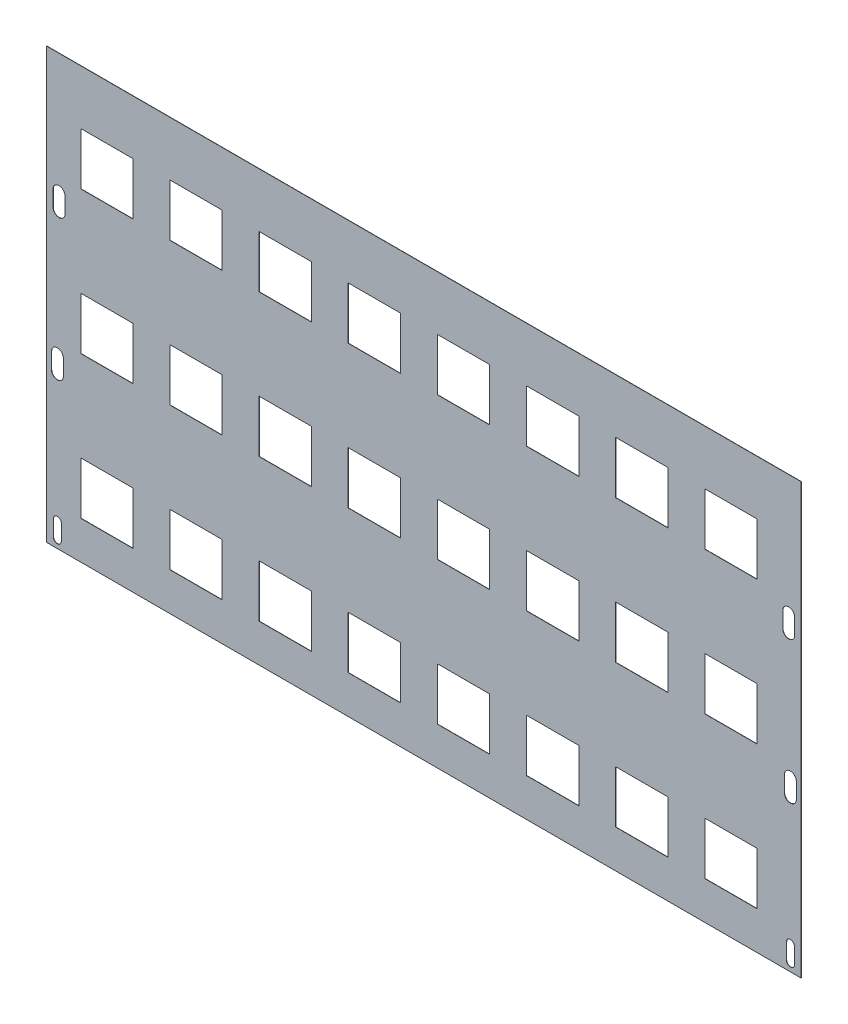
SolidWorks part; units mm, degrees
ref_plane "Front Plane" through (0, 0, 0) normal (0, 0, 1) x (1, 0, 0)
ref_plane "Top Plane" through (0, 0, 0) normal (0, 1, 0) x (1, 0, 0)
ref_plane "Right Plane" through (0, 0, 0) normal (1, 0, 0) x (0, 0, -1)
sketch "Model" plane through (0, 0, 0) normal (0, 0, 1) x (1, 0, 0)
  line L0 (1790, 440) -> (1640, 440)
  line L1 (1640, 440) -> (1640, 595)
  line L2 (1640, 595) -> (1650, 595)
  line L3 (1650, 595) -> (1650, 662)
  line L4 (1650, 662) -> (1780, 662)
  line L5 (1780, 662) -> (1780, 595)
  line L6 (1780, 595) -> (1790, 595)
  line L7 (1790, 595) -> (1790, 440)
  line L8 (1595, 440) -> (1445, 440)
  line L9 (1445, 440) -> (1445, 595)
  line L10 (1445, 595) -> (1455, 595)
  line L11 (1455, 595) -> (1455, 662)
  line L12 (1455, 662) -> (1585, 662)
  line L13 (1585, 662) -> (1585, 595)
  line L14 (1585, 595) -> (1595, 595)
  line L15 (1595, 595) -> (1595, 440)
  line L16 (1400, 440) -> (1250, 440)
  line L17 (1250, 440) -> (1250, 595)
  line L18 (1250, 595) -> (1260, 595)
  line L19 (1260, 595) -> (1260, 662)
  line L20 (1260, 662) -> (1390, 662)
  line L21 (1390, 662) -> (1390, 595)
  line L22 (1390, 595) -> (1400, 595)
  line L23 (1400, 595) -> (1400, 440)
  line L24 (1205, 440) -> (1055, 440)
  line L25 (1055, 440) -> (1055, 595)
  line L26 (1055, 595) -> (1065, 595)
  line L27 (1065, 595) -> (1065, 662)
  line L28 (1065, 662) -> (1195, 662)
  line L29 (1195, 662) -> (1195, 595)
  line L30 (1195, 595) -> (1205, 595)
  line L31 (1205, 595) -> (1205, 440)
  line L32 (1010, 440) -> (860, 440)
  line L33 (860, 440) -> (860, 595)
  line L34 (860, 595) -> (870, 595)
  line L35 (870, 595) -> (870, 662)
  line L36 (870, 662) -> (1000, 662)
  line L37 (1000, 662) -> (1000, 595)
  line L38 (1000, 595) -> (1010, 595)
  line L39 (1010, 595) -> (1010, 440)
  line L40 (815, 440) -> (665, 440)
  line L41 (665, 440) -> (665, 595)
  line L42 (665, 595) -> (675, 595)
  line L43 (675, 595) -> (675, 662)
  line L44 (675, 662) -> (805, 662)
  line L45 (805, 662) -> (805, 595)
  line L46 (805, 595) -> (815, 595)
  line L47 (815, 595) -> (815, 440)
  line L48 (620, 440) -> (470, 440)
  line L49 (470, 440) -> (470, 595)
  line L50 (470, 595) -> (480, 595)
  line L51 (480, 595) -> (480, 662)
  line L52 (480, 662) -> (610, 662)
  line L53 (610, 662) -> (610, 595)
  line L54 (610, 595) -> (620, 595)
  line L55 (620, 595) -> (620, 440)
  line L56 (425, 440) -> (275, 440)
  line L57 (275, 440) -> (275, 595)
  line L58 (275, 595) -> (285, 595)
  line L59 (285, 595) -> (285, 662)
  line L60 (285, 662) -> (415, 662)
  line L61 (415, 662) -> (415, 595)
  line L62 (415, 595) -> (425, 595)
  line L63 (425, 595) -> (425, 440)
  line L64 (230, 440) -> (80, 440)
  line L65 (80, 440) -> (80, 595)
  line L66 (80, 595) -> (90, 595)
  line L67 (90, 595) -> (90, 662)
  line L68 (90, 662) -> (220, 662)
  line L69 (220, 662) -> (220, 595)
  line L70 (220, 595) -> (230, 595)
  line L71 (230, 595) -> (230, 440)
  line L72 (1790, 805) -> (1640, 805)
  line L73 (1640, 805) -> (1640, 960)
  line L74 (1640, 960) -> (1650, 960)
  line L75 (1650, 960) -> (1650, 1027)
  line L76 (1650, 1027) -> (1780, 1027)
  line L77 (1780, 1027) -> (1780, 960)
  line L78 (1780, 960) -> (1790, 960)
  line L79 (1790, 960) -> (1790, 805)
  line L80 (1595, 805) -> (1445, 805)
  line L81 (1445, 805) -> (1445, 960)
  line L82 (1445, 960) -> (1455, 960)
  line L83 (1455, 960) -> (1455, 1027)
  line L84 (1455, 1027) -> (1585, 1027)
  line L85 (1585, 1027) -> (1585, 960)
  line L86 (1585, 960) -> (1595, 960)
  line L87 (1595, 960) -> (1595, 805)
  line L88 (1400, 805) -> (1250, 805)
  line L89 (1250, 805) -> (1250, 960)
  line L90 (1250, 960) -> (1260, 960)
  line L91 (1260, 960) -> (1260, 1027)
  line L92 (1260, 1027) -> (1390, 1027)
  line L93 (1390, 1027) -> (1390, 960)
  line L94 (1390, 960) -> (1400, 960)
  line L95 (1400, 960) -> (1400, 805)
  line L96 (1205, 805) -> (1055, 805)
  line L97 (1055, 805) -> (1055, 960)
  line L98 (1055, 960) -> (1065, 960)
  line L99 (1065, 960) -> (1065, 1027)
  line L100 (1065, 1027) -> (1195, 1027)
  line L101 (1195, 1027) -> (1195, 960)
  line L102 (1195, 960) -> (1205, 960)
  line L103 (1205, 960) -> (1205, 805)
  line L104 (1010, 805) -> (860, 805)
  line L105 (860, 805) -> (860, 960)
  line L106 (860, 960) -> (870, 960)
  line L107 (870, 960) -> (870, 1027)
  line L108 (870, 1027) -> (1000, 1027)
  line L109 (1000, 1027) -> (1000, 960)
  line L110 (1000, 960) -> (1010, 960)
  line L111 (1010, 960) -> (1010, 805)
  line L112 (815, 805) -> (665, 805)
  line L113 (665, 805) -> (665, 960)
  line L114 (665, 960) -> (675, 960)
  line L115 (675, 960) -> (675, 1027)
  line L116 (675, 1027) -> (805, 1027)
  line L117 (805, 1027) -> (805, 960)
  line L118 (805, 960) -> (815, 960)
  line L119 (815, 960) -> (815, 805)
  line L120 (620, 805) -> (470, 805)
  line L121 (470, 805) -> (470, 960)
  line L122 (470, 960) -> (480, 960)
  line L123 (480, 960) -> (480, 1027)
  line L124 (480, 1027) -> (610, 1027)
  line L125 (610, 1027) -> (610, 960)
  line L126 (610, 960) -> (620, 960)
  line L127 (620, 960) -> (620, 805)
  line L128 (425, 805) -> (275, 805)
  line L129 (275, 805) -> (275, 960)
  line L130 (275, 960) -> (285, 960)
  line L131 (285, 960) -> (285, 1027)
  line L132 (285, 1027) -> (415, 1027)
  line L133 (415, 1027) -> (415, 960)
  line L134 (415, 960) -> (425, 960)
  line L135 (425, 960) -> (425, 805)
  line L136 (230, 805) -> (80, 805)
  line L137 (80, 805) -> (80, 960)
  line L138 (80, 960) -> (90, 960)
  line L139 (90, 960) -> (90, 1027)
  line L140 (90, 1027) -> (220, 1027)
  line L141 (220, 1027) -> (220, 960)
  line L142 (220, 960) -> (230, 960)
  line L143 (230, 960) -> (230, 805)
  line L144 (1790, 75) -> (1640, 75)
  line L145 (1640, 75) -> (1640, 230)
  line L146 (1640, 230) -> (1650, 230)
  line L147 (1650, 230) -> (1650, 297)
  line L148 (1650, 297) -> (1780, 297)
  line L149 (1780, 297) -> (1780, 230)
  line L150 (1780, 230) -> (1790, 230)
  line L151 (1790, 230) -> (1790, 75)
  line L152 (1595, 75) -> (1445, 75)
  line L153 (1445, 75) -> (1445, 230)
  line L154 (1445, 230) -> (1455, 230)
  line L155 (1455, 230) -> (1455, 297)
  line L156 (1455, 297) -> (1585, 297)
  line L157 (1585, 297) -> (1585, 230)
  line L158 (1585, 230) -> (1595, 230)
  line L159 (1595, 230) -> (1595, 75)
  line L160 (1400, 75) -> (1250, 75)
  line L161 (1250, 75) -> (1250, 230)
  line L162 (1250, 230) -> (1260, 230)
  line L163 (1260, 230) -> (1260, 297)
  line L164 (1260, 297) -> (1390, 297)
  line L165 (1390, 297) -> (1390, 230)
  line L166 (1390, 230) -> (1400, 230)
  line L167 (1400, 230) -> (1400, 75)
  line L168 (1205, 75) -> (1055, 75)
  line L169 (1055, 75) -> (1055, 230)
  line L170 (1055, 230) -> (1065, 230)
  line L171 (1065, 230) -> (1065, 297)
  line L172 (1065, 297) -> (1195, 297)
  line L173 (1195, 297) -> (1195, 230)
  line L174 (1195, 230) -> (1205, 230)
  line L175 (1205, 230) -> (1205, 75)
  line L176 (1010, 75) -> (860, 75)
  line L177 (860, 75) -> (860, 230)
  line L178 (860, 230) -> (870, 230)
  line L179 (870, 230) -> (870, 297)
  line L180 (870, 297) -> (1000, 297)
  line L181 (1000, 297) -> (1000, 230)
  line L182 (1000, 230) -> (1010, 230)
  line L183 (1010, 230) -> (1010, 75)
  line L184 (815, 75) -> (665, 75)
  line L185 (665, 75) -> (665, 230)
  line L186 (665, 230) -> (675, 230)
  line L187 (675, 230) -> (675, 297)
  line L188 (675, 297) -> (805, 297)
  line L189 (805, 297) -> (805, 230)
  line L190 (805, 230) -> (815, 230)
  line L191 (815, 230) -> (815, 75)
  line L192 (620, 75) -> (470, 75)
  line L193 (470, 75) -> (470, 230)
  line L194 (470, 230) -> (480, 230)
  line L195 (480, 230) -> (480, 297)
  line L196 (480, 297) -> (610, 297)
  line L197 (610, 297) -> (610, 230)
  line L198 (610, 230) -> (620, 230)
  line L199 (620, 230) -> (620, 75)
  line L200 (425, 75) -> (275, 75)
  line L201 (275, 75) -> (275, 230)
  line L202 (275, 230) -> (285, 230)
  line L203 (285, 230) -> (285, 297)
  line L204 (285, 297) -> (415, 297)
  line L205 (415, 297) -> (415, 230)
  line L206 (415, 230) -> (425, 230)
  line L207 (425, 230) -> (425, 75)
  line L208 (230, 75) -> (80, 75)
  line L209 (80, 75) -> (80, 230)
  line L210 (80, 230) -> (90, 230)
  line L211 (90, 230) -> (90, 297)
  line L212 (90, 297) -> (220, 297)
  line L213 (220, 297) -> (220, 230)
  line L214 (220, 230) -> (230, 230)
  line L215 (230, 230) -> (230, 75)
  line L216 (0, 1180) -> (0, 0)
  line L217 (0, 0) -> (1870, 0)
  line L218 (1870, 0) -> (1870, 1180)
  line L219 (1870, 1180) -> (0, 1180)
  dimension "D1" = 3
base flange "Base-Flange1" sketch "Model" thickness 0.6 reverse thickness direction no parameters "D1"=0.7366
sketch "Sketch6" plane through (0, 0, 0) normal (0, 0, 1) x (1, 0, 0)
  line L3 (1705, 805) -> (1725, 805)
  line L7 (1725, 1027) -> (1705, 1027)
  line L8 (1779, 1026) -> (1725, 1026)
  line L9 (1651, 1026) -> (1651, 959)
  line L10 (1651, 959) -> (1641, 959)
  line L11 (1641, 959) -> (1641, 806)
  line L12 (1641, 806) -> (1705, 806)
  line L13 (1789, 806) -> (1789, 959)
  line L14 (1789, 959) -> (1779, 959)
  line L15 (1779, 959) -> (1779, 1026)
  line L16 (1705, 1026) -> (1651, 1026)
  line L17 (1780, 1027) -> (1650, 1027) construction
  line L18 (1705, 1027) -> (1705, 1026)
  line L19 (1725, 1027) -> (1725, 1026)
  line L20 (1705, 806) -> (1705, 805)
  line L21 (1725, 806) -> (1725, 805)
  line L22 (1725, 806) -> (1789, 806)
  line L23 (1641, 806) -> (1789, 806) construction
  line L24 (1779, 1026) -> (1651, 1026) construction
  line L25 (1640, 805) -> (1790, 805) construction
  line L26 (1650, 1027) -> (1650, 960) construction
  line L27 (1650, 960) -> (1640, 960) construction
  line L28 (1640, 960) -> (1640, 805) construction
  line L29 (1790, 805) -> (1790, 960) construction
  line L30 (1790, 960) -> (1780, 960) construction
  line L31 (1780, 960) -> (1780, 1027) construction
  line L32 (1705, 440) -> (1725, 440)
  line L33 (1725, 662) -> (1705, 662)
  line L34 (1779, 661) -> (1725, 661)
  line L35 (1651, 661) -> (1651, 594)
  line L36 (1651, 594) -> (1641, 594)
  line L37 (1641, 594) -> (1641, 441)
  line L38 (1641, 441) -> (1705, 441)
  line L39 (1789, 441) -> (1789, 594)
  line L40 (1789, 594) -> (1779, 594)
  line L41 (1779, 594) -> (1779, 661)
  line L42 (1705, 661) -> (1651, 661)
  line L43 (1705, 662) -> (1705, 661)
  line L44 (1725, 662) -> (1725, 661)
  line L45 (1705, 441) -> (1705, 440)
  line L46 (1725, 441) -> (1725, 440)
  line L47 (1725, 441) -> (1789, 441)
  line L48 (1705, 75) -> (1725, 75)
  line L49 (1725, 297) -> (1705, 297)
  line L50 (1779, 296) -> (1725, 296)
  line L51 (1651, 296) -> (1651, 229)
  line L52 (1651, 229) -> (1641, 229)
  line L53 (1641, 229) -> (1641, 76)
  line L54 (1641, 76) -> (1705, 76)
  line L55 (1789, 76) -> (1789, 229)
  line L56 (1789, 229) -> (1779, 229)
  line L57 (1779, 229) -> (1779, 296)
  line L58 (1705, 296) -> (1651, 296)
  line L59 (1705, 297) -> (1705, 296)
  line L60 (1725, 297) -> (1725, 296)
  line L61 (1705, 76) -> (1705, 75)
  line L62 (1725, 76) -> (1725, 75)
  line L63 (1725, 76) -> (1789, 76)
  dimension "D1" = 1
  dimension "D2" = 3
base flange "Tab1" sketch "Sketch6" thickness 0.6 reverse thickness direction no parameters "D1"=0.7366
sketch "Sketch7" plane through (0, 0, 0) normal (0, 0, 1) x (1, 0, 0)
  line L1 (1870, 1180) -> (1935, 1180)
  line L2 (1870, 1180) -> (1870, 0)
  line L3 (1870, 0) -> (1935, 0)
  line L4 (1935, 1180) -> (1935, 0)
  line L5 (0, 0) -> (-65, 0)
  line L6 (0, 0) -> (0, 1180)
  line L7 (0, 1180) -> (-65, 1180)
  line L8 (-65, 0) -> (-65, 1180)
  dimension "D1" = 65
  dimension "D2" = 65
base flange "Tab2" sketch "Sketch7" thickness 0.6 reverse thickness direction no parameters "D1"=0.7366
sketch "Sketch9" plane through (0, 0, 0) normal (0, 0, 1) x (1, 0, 0)
  line L1 (30.4802, 1078.5447) -> (1870.8092, 1078.5447)
  line L2 (30.4802, 1078.5447) -> (30.4802, 32.6023)
  line L3 (30.4802, 32.6023) -> (1870.8092, 32.6023)
  line L4 (1870.8092, 1078.5447) -> (1870.8092, 32.6023)
extrude "Boss-Extrude1" add sketch "Sketch9" against normal up to surface (0.6 mm away)
sketch "Sketch8" plane through (0, 0, 0) normal (0, 0, 1) x (1, 0, 0)
  line L312 (21.0507, 947.9116) -> (21.0507, 815.9116)
  line L313 (21.0507, 815.9116) -> (153.0507, 815.9116)
  line L314 (153.0507, 815.9116) -> (153.0507, 947.9116)
  line L315 (153.0507, 947.9116) -> (21.0507, 947.9116)
  line L340 (21.0507, 587.9116) -> (21.0507, 455.9116)
  line L341 (21.0507, 455.9116) -> (153.0507, 455.9116)
  line L342 (153.0507, 455.9116) -> (153.0507, 587.9116)
  line L343 (153.0507, 587.9116) -> (21.0507, 587.9116)
  line L368 (21.0507, 227.9116) -> (21.0507, 95.9116)
  line L369 (21.0507, 95.9116) -> (153.0507, 95.9116)
  line L370 (153.0507, 95.9116) -> (153.0507, 227.9116)
  line L371 (153.0507, 227.9116) -> (21.0507, 227.9116)
  line L548 (246.0507, 947.9116) -> (246.0507, 815.9116)
  line L549 (246.0507, 815.9116) -> (378.0507, 815.9116)
  line L550 (378.0507, 815.9116) -> (378.0507, 947.9116)
  line L551 (378.0507, 947.9116) -> (246.0507, 947.9116)
  line L552 (246.0507, 587.9116) -> (246.0507, 455.9116)
  line L553 (246.0507, 455.9116) -> (378.0507, 455.9116)
  line L554 (378.0507, 455.9116) -> (378.0507, 587.9116)
  line L555 (378.0507, 587.9116) -> (246.0507, 587.9116)
  line L556 (246.0507, 227.9116) -> (246.0507, 95.9116)
  line L557 (246.0507, 95.9116) -> (378.0507, 95.9116)
  line L558 (378.0507, 95.9116) -> (378.0507, 227.9116)
  line L559 (378.0507, 227.9116) -> (246.0507, 227.9116)
  line L560 (471.0507, 947.9116) -> (471.0507, 815.9116)
  line L561 (471.0507, 815.9116) -> (603.0507, 815.9116)
  line L562 (603.0507, 815.9116) -> (603.0507, 947.9116)
  line L563 (603.0507, 947.9116) -> (471.0507, 947.9116)
  line L564 (471.0507, 587.9116) -> (471.0507, 455.9116)
  line L565 (471.0507, 455.9116) -> (603.0507, 455.9116)
  line L566 (603.0507, 455.9116) -> (603.0507, 587.9116)
  line L567 (603.0507, 587.9116) -> (471.0507, 587.9116)
  line L568 (471.0507, 227.9116) -> (471.0507, 95.9116)
  line L569 (471.0507, 95.9116) -> (603.0507, 95.9116)
  line L570 (603.0507, 95.9116) -> (603.0507, 227.9116)
  line L571 (603.0507, 227.9116) -> (471.0507, 227.9116)
  line L572 (696.0507, 947.9116) -> (696.0507, 815.9116)
  line L573 (696.0507, 815.9116) -> (828.0507, 815.9116)
  line L574 (828.0507, 815.9116) -> (828.0507, 947.9116)
  line L575 (828.0507, 947.9116) -> (696.0507, 947.9116)
  line L576 (696.0507, 587.9116) -> (696.0507, 455.9116)
  line L577 (696.0507, 455.9116) -> (828.0507, 455.9116)
  line L578 (828.0507, 455.9116) -> (828.0507, 587.9116)
  line L579 (828.0507, 587.9116) -> (696.0507, 587.9116)
  line L580 (696.0507, 227.9116) -> (696.0507, 95.9116)
  line L581 (696.0507, 95.9116) -> (828.0507, 95.9116)
  line L582 (828.0507, 95.9116) -> (828.0507, 227.9116)
  line L583 (828.0507, 227.9116) -> (696.0507, 227.9116)
  line L584 (921.0507, 947.9116) -> (921.0507, 815.9116)
  line L585 (921.0507, 815.9116) -> (1053.0507, 815.9116)
  line L586 (1053.0507, 815.9116) -> (1053.0507, 947.9116)
  line L587 (1053.0507, 947.9116) -> (921.0507, 947.9116)
  line L588 (921.0507, 587.9116) -> (921.0507, 455.9116)
  line L589 (921.0507, 455.9116) -> (1053.0507, 455.9116)
  line L590 (1053.0507, 455.9116) -> (1053.0507, 587.9116)
  line L591 (1053.0507, 587.9116) -> (921.0507, 587.9116)
  line L592 (921.0507, 227.9116) -> (921.0507, 95.9116)
  line L593 (921.0507, 95.9116) -> (1053.0507, 95.9116)
  line L594 (1053.0507, 95.9116) -> (1053.0507, 227.9116)
  line L595 (1053.0507, 227.9116) -> (921.0507, 227.9116)
  line L596 (1146.0507, 947.9116) -> (1146.0507, 815.9116)
  line L597 (1146.0507, 815.9116) -> (1278.0507, 815.9116)
  line L598 (1278.0507, 815.9116) -> (1278.0507, 947.9116)
  line L599 (1278.0507, 947.9116) -> (1146.0507, 947.9116)
  line L600 (1146.0507, 587.9116) -> (1146.0507, 455.9116)
  line L601 (1146.0507, 455.9116) -> (1278.0507, 455.9116)
  line L602 (1278.0507, 455.9116) -> (1278.0507, 587.9116)
  line L603 (1278.0507, 587.9116) -> (1146.0507, 587.9116)
  line L604 (1146.0507, 227.9116) -> (1146.0507, 95.9116)
  line L605 (1146.0507, 95.9116) -> (1278.0507, 95.9116)
  line L606 (1278.0507, 95.9116) -> (1278.0507, 227.9116)
  line L607 (1278.0507, 227.9116) -> (1146.0507, 227.9116)
  line L608 (1371.0507, 947.9116) -> (1371.0507, 815.9116)
  line L609 (1371.0507, 815.9116) -> (1503.0507, 815.9116)
  line L610 (1503.0507, 815.9116) -> (1503.0507, 947.9116)
  line L611 (1503.0507, 947.9116) -> (1371.0507, 947.9116)
  line L612 (1371.0507, 587.9116) -> (1371.0507, 455.9116)
  line L613 (1371.0507, 455.9116) -> (1503.0507, 455.9116)
  line L614 (1503.0507, 455.9116) -> (1503.0507, 587.9116)
  line L615 (1503.0507, 587.9116) -> (1371.0507, 587.9116)
  line L616 (1371.0507, 227.9116) -> (1371.0507, 95.9116)
  line L617 (1371.0507, 95.9116) -> (1503.0507, 95.9116)
  line L618 (1503.0507, 95.9116) -> (1503.0507, 227.9116)
  line L619 (1503.0507, 227.9116) -> (1371.0507, 227.9116)
  line L620 (1596.0507, 947.9116) -> (1596.0507, 815.9116)
  line L621 (1596.0507, 815.9116) -> (1728.0507, 815.9116)
  line L622 (1728.0507, 815.9116) -> (1728.0507, 947.9116)
  line L623 (1728.0507, 947.9116) -> (1596.0507, 947.9116)
  line L624 (1596.0507, 587.9116) -> (1596.0507, 455.9116)
  line L625 (1596.0507, 455.9116) -> (1728.0507, 455.9116)
  line L626 (1728.0507, 455.9116) -> (1728.0507, 587.9116)
  line L627 (1728.0507, 587.9116) -> (1596.0507, 587.9116)
  line L628 (1596.0507, 227.9116) -> (1596.0507, 95.9116)
  line L629 (1596.0507, 95.9116) -> (1728.0507, 95.9116)
  line L630 (1728.0507, 95.9116) -> (1728.0507, 227.9116)
  line L631 (1728.0507, 227.9116) -> (1596.0507, 227.9116)
  dimension "D1" = 8
extrude "Cut-Extrude1" cut sketch "Sketch8" against normal blind 10
sketch "Sketch10" plane through (0, 0, 0) normal (0, 0, 1) x (1, 0, 0)
  line L0 (-65, 0) -> (1935, 0) construction
  line L1 (1935, 1180) -> (1839, 1180)
  line L2 (1935, 1180) -> (1935, 0)
  line L3 (1935, 0) -> (1839, 0)
  line L4 (1839, 1180) -> (1839, 0)
  dimension "D1" = 96
extrude "Cut-Extrude2" cut sketch "Sketch10" against normal blind 506
sketch "Sketch11" plane through (0, 0, -0.6) normal (0, 0, -1) x (-1, 0, 0)
  line L0 (33.9689, 780.6389) -> (33.9689, 740.6389) construction
  line L1 (48.9689, 780.6389) -> (48.9689, 740.6389)
  line L2 (18.9689, 780.6389) -> (18.9689, 740.6389)
  line L3 (38, 423.9116) -> (38, 383.9116) construction
  line L4 (53, 423.9116) -> (53, 383.9116)
  line L5 (23, 423.9116) -> (23, 383.9116)
  line L6 (38.2604, 60.6389) -> (38.2604, 20.6389) construction
  line L7 (48.2604, 60.6389) -> (48.2604, 20.6389)
  line L8 (28.2604, 60.6389) -> (28.2604, 20.6389)
  arc A0 (48.9689, 780.6389) -> (18.9689, 780.6389) centre (33.9689, 780.6389) ccw
  arc A1 (18.9689, 740.6389) -> (48.9689, 740.6389) centre (33.9689, 740.6389) ccw
  arc A2 (53, 423.9116) -> (23, 423.9116) centre (38, 423.9116) ccw
  arc A3 (23, 383.9116) -> (53, 383.9116) centre (38, 383.9116) ccw
  arc A4 (48.2604, 60.6389) -> (28.2604, 60.6389) centre (38.2604, 60.6389) ccw
  arc A5 (28.2604, 20.6389) -> (48.2604, 20.6389) centre (38.2604, 20.6389) ccw
  point P2 (33.9689, 760.6389)
  point P12 (38, 403.9116)
  point P21 (38.2604, 40.6389)
  dimension "D3" = 15
  dimension "D4" = 10
  dimension "D1" = 30
  dimension "D2" = 40
extrude "Cut-Extrude3" cut sketch "Sketch11" against normal blind 10
ref_plane "Plane1" through (887, 0, 0) normal (-1, 0, 0) x (0, 0, 1)
mirror "Mirror1" about plane through (887, 0, 0) normal (-1, 0, 0) of "Cut-Extrude3"
sketch "Sketch12" plane through (0, 0, 0) normal (0, 0, 1) x (1, 0, 0)
  line L0 (-65, 1180) -> (-65, 0) construction
  line L1 (1839, 1180) -> (-65, 1180)
  line L2 (1839, 1180) -> (1839, 1085)
  line L3 (1839, 1085) -> (-65, 1085)
  line L4 (-65, 1180) -> (-65, 1085)
  dimension "D1" = 95
extrude "Cut-Extrude4" cut sketch "Sketch12" against normal blind 10
sketch "Bend-Lines1" [suppressed] plane through (0, 0, 0) normal (0, 1, 0) x (1, 0, 0)
sketch "Bounding-Box1" [suppressed] plane through (0, 0, 0) normal (0, 1, 0) x (1, 0, 0)
sheet metal parameters "Sheet-Metal1" thickness 0.6 parameters "D1"=0.7366
flat pattern "Flat-Pattern1"
sketch "Bend-Lines2" plane through (0, 0, 0) normal (0, 1, 0) x (1, 0, 0)
sketch3d "Bounding-Box2" [suppressed]
  line L0 (0, 0, 0) -> (-1870, 0, 0) construction
  line L1 (0, 1180, 0) -> (-1870, 1180, 0) construction
  line L2 (0, 0, 0) -> (0, 1180, 0) construction
  line L3 (-1870, 0, 0) -> (-1870, 1180, 0) construction
sheet metal parameters "Sheet-Metal2" thickness 0.6 parameters "D1"=0.7366
flat pattern "Flat-Pattern2"
sketch "Bend-Lines3" plane through (0, 0, 0) normal (0, 1, 0) x (1, 0, 0)
sketch3d "Bounding-Box3" [suppressed]
  line L0 (0, 0, 0) -> (-1870, 0, 0) construction
  line L1 (0, 1180, 0) -> (-1870, 1180, 0) construction
  line L2 (0, 0, 0) -> (0, 1180, 0) construction
  line L3 (-1870, 0, 0) -> (-1870, 1180, 0) construction
sheet metal parameters "Sheet-Metal5" thickness 0.6 parameters "D1"=0.7366
flat pattern "Flat-Pattern5"
sketch "Bend-Lines4" plane through (0, 0, 0) normal (0, 1, 0) x (1, 0, 0)
sketch3d "Bounding-Box4" [suppressed]
  line L0 (65, 0, 0) -> (-1935, 0, 0) construction
  line L1 (65, 1180, 0) -> (-1935, 1180, 0) construction
  line L2 (65, 0, 0) -> (65, 1180, 0) construction
  line L3 (-1935, 0, 0) -> (-1935, 1180, 0) construction
sheet metal parameters "Sheet-Metal6" thickness 0.6 parameters "D1"=0.7366
flat pattern "Flat-Pattern5"
sketch "Bend-Lines4" plane through (0, 0, 0) normal (0, 1, 0) x (1, 0, 0)
sketch3d "Bounding-Box4" [suppressed]
  line L0 (65, 0, 0) -> (-1935, 0, 0) construction
  line L1 (65, 1180, 0) -> (-1935, 1180, 0) construction
  line L2 (65, 0, 0) -> (65, 1180, 0) construction
  line L3 (-1935, 0, 0) -> (-1935, 1180, 0) construction
sketch "Sketch8-1" plane through (0, 0, 0) normal (0, 0, 1) x (1, 0, 0)
  line L0 (91.0507, 947.9116) -> (91.0507, 815.9116)
  line L1 (223.0507, 947.9116) -> (91.0507, 947.9116)
  line L2 (223.0507, 815.9116) -> (223.0507, 947.9116)
  line L3 (91.0507, 815.9116) -> (223.0507, 815.9116)
  line L4 (67.0507, 1045.9116) -> (82.0507, 1045.9116)
  line L5 (232.0507, 1045.9116) -> (82.0507, 1045.9116)
  line L6 (247.0507, 1045.9116) -> (232.0507, 1045.9116)
  line L7 (247.0507, 968.9116) -> (247.0507, 1045.9116)
  line L8 (247.0507, 793.9116) -> (247.0507, 968.9116)
  line L9 (67.0507, 793.9116) -> (247.0507, 793.9116)
  line L10 (67.0507, 973.9116) -> (67.0507, 793.9116)
  line L11 (67.0507, 973.9116) -> (67.0507, 1045.9116)
  line L12 (321.0507, 947.9116) -> (321.0507, 815.9116)
  line L13 (453.0507, 947.9116) -> (321.0507, 947.9116)
  line L14 (453.0507, 815.9116) -> (453.0507, 947.9116)
  line L15 (321.0507, 815.9116) -> (453.0507, 815.9116)
  line L16 (297.0507, 1045.9116) -> (312.0507, 1045.9116)
  line L17 (462.0507, 1045.9116) -> (312.0507, 1045.9116)
  line L18 (477.0507, 1045.9116) -> (462.0507, 1045.9116)
  line L19 (477.0507, 968.9116) -> (477.0507, 1045.9116)
  line L20 (477.0507, 793.9116) -> (477.0507, 968.9116)
  line L21 (297.0507, 793.9116) -> (477.0507, 793.9116)
  line L22 (297.0507, 973.9116) -> (297.0507, 793.9116)
  line L23 (297.0507, 973.9116) -> (297.0507, 1045.9116)
  line L24 (551.0507, 947.9116) -> (551.0507, 815.9116)
  line L25 (683.0507, 947.9116) -> (551.0507, 947.9116)
  line L26 (683.0507, 815.9116) -> (683.0507, 947.9116)
  line L27 (551.0507, 815.9116) -> (683.0507, 815.9116)
  line L28 (527.0507, 1045.9116) -> (542.0507, 1045.9116)
  line L29 (692.0507, 1045.9116) -> (542.0507, 1045.9116)
  line L30 (707.0507, 1045.9116) -> (692.0507, 1045.9116)
  line L31 (707.0507, 968.9116) -> (707.0507, 1045.9116)
  line L32 (707.0507, 793.9116) -> (707.0507, 968.9116)
  line L33 (527.0507, 793.9116) -> (707.0507, 793.9116)
  line L34 (527.0507, 973.9116) -> (527.0507, 793.9116)
  line L35 (527.0507, 973.9116) -> (527.0507, 1045.9116)
  line L36 (781.0507, 947.9116) -> (781.0507, 815.9116)
  line L37 (913.0507, 947.9116) -> (781.0507, 947.9116)
  line L38 (913.0507, 815.9116) -> (913.0507, 947.9116)
  line L39 (781.0507, 815.9116) -> (913.0507, 815.9116)
  line L40 (757.0507, 1045.9116) -> (772.0507, 1045.9116)
  line L41 (922.0507, 1045.9116) -> (772.0507, 1045.9116)
  line L42 (937.0507, 1045.9116) -> (922.0507, 1045.9116)
  line L43 (937.0507, 968.9116) -> (937.0507, 1045.9116)
  line L44 (937.0507, 793.9116) -> (937.0507, 968.9116)
  line L45 (757.0507, 793.9116) -> (937.0507, 793.9116)
  line L46 (757.0507, 973.9116) -> (757.0507, 793.9116)
  line L47 (757.0507, 973.9116) -> (757.0507, 1045.9116)
  line L48 (1011.0507, 947.9116) -> (1011.0507, 815.9116)
  line L49 (1143.0507, 947.9116) -> (1011.0507, 947.9116)
  line L50 (1143.0507, 815.9116) -> (1143.0507, 947.9116)
  line L51 (1011.0507, 815.9116) -> (1143.0507, 815.9116)
  line L52 (987.0507, 1045.9116) -> (1002.0507, 1045.9116)
  line L53 (1152.0507, 1045.9116) -> (1002.0507, 1045.9116)
  line L54 (1167.0507, 1045.9116) -> (1152.0507, 1045.9116)
  line L55 (1167.0507, 968.9116) -> (1167.0507, 1045.9116)
  line L56 (1167.0507, 793.9116) -> (1167.0507, 968.9116)
  line L57 (987.0507, 793.9116) -> (1167.0507, 793.9116)
  line L58 (987.0507, 973.9116) -> (987.0507, 793.9116)
  line L59 (987.0507, 973.9116) -> (987.0507, 1045.9116)
  line L60 (1241.0507, 947.9116) -> (1241.0507, 815.9116)
  line L61 (1373.0507, 947.9116) -> (1241.0507, 947.9116)
  line L62 (1373.0507, 815.9116) -> (1373.0507, 947.9116)
  line L63 (1241.0507, 815.9116) -> (1373.0507, 815.9116)
  line L64 (1217.0507, 1045.9116) -> (1232.0507, 1045.9116)
  line L65 (1382.0507, 1045.9116) -> (1232.0507, 1045.9116)
  line L66 (1397.0507, 1045.9116) -> (1382.0507, 1045.9116)
  line L67 (1397.0507, 968.9116) -> (1397.0507, 1045.9116)
  line L68 (1397.0507, 793.9116) -> (1397.0507, 968.9116)
  line L69 (1217.0507, 793.9116) -> (1397.0507, 793.9116)
  line L70 (1217.0507, 973.9116) -> (1217.0507, 793.9116)
  line L71 (1217.0507, 973.9116) -> (1217.0507, 1045.9116)
  line L72 (1471.0507, 947.9116) -> (1471.0507, 815.9116)
  line L73 (1603.0507, 947.9116) -> (1471.0507, 947.9116)
  line L74 (1603.0507, 815.9116) -> (1603.0507, 947.9116)
  line L75 (1471.0507, 815.9116) -> (1603.0507, 815.9116)
  line L76 (1447.0507, 1045.9116) -> (1462.0507, 1045.9116)
  line L77 (1612.0507, 1045.9116) -> (1462.0507, 1045.9116)
  line L78 (1627.0507, 1045.9116) -> (1612.0507, 1045.9116)
  line L79 (1627.0507, 968.9116) -> (1627.0507, 1045.9116)
  line L80 (1627.0507, 793.9116) -> (1627.0507, 968.9116)
  line L81 (1447.0507, 793.9116) -> (1627.0507, 793.9116)
  line L82 (1447.0507, 973.9116) -> (1447.0507, 793.9116)
  line L83 (1447.0507, 973.9116) -> (1447.0507, 1045.9116)
  line L84 (1701.0507, 947.9116) -> (1701.0507, 815.9116)
  line L85 (1833.0507, 947.9116) -> (1701.0507, 947.9116)
  line L86 (1833.0507, 815.9116) -> (1833.0507, 947.9116)
  line L87 (1701.0507, 815.9116) -> (1833.0507, 815.9116)
  line L88 (1677.0507, 1045.9116) -> (1692.0507, 1045.9116)
  line L89 (1842.0507, 1045.9116) -> (1692.0507, 1045.9116)
  line L90 (1857.0507, 1045.9116) -> (1842.0507, 1045.9116)
  line L91 (1857.0507, 968.9116) -> (1857.0507, 1045.9116)
  line L92 (1857.0507, 793.9116) -> (1857.0507, 968.9116)
  line L93 (1677.0507, 793.9116) -> (1857.0507, 793.9116)
  line L94 (1677.0507, 973.9116) -> (1677.0507, 793.9116)
  line L95 (1677.0507, 973.9116) -> (1677.0507, 1045.9116)
  line L96 (91.0507, 587.9116) -> (91.0507, 455.9116)
  line L97 (223.0507, 587.9116) -> (91.0507, 587.9116)
  line L98 (223.0507, 455.9116) -> (223.0507, 587.9116)
  line L99 (91.0507, 455.9116) -> (223.0507, 455.9116)
  line L100 (67.0507, 685.9116) -> (82.0507, 685.9116)
  line L101 (232.0507, 685.9116) -> (82.0507, 685.9116)
  line L102 (247.0507, 685.9116) -> (232.0507, 685.9116)
  line L103 (247.0507, 608.9116) -> (247.0507, 685.9116)
  line L104 (247.0507, 433.9116) -> (247.0507, 608.9116)
  line L105 (67.0507, 433.9116) -> (247.0507, 433.9116)
  line L106 (67.0507, 613.9116) -> (67.0507, 433.9116)
  line L107 (67.0507, 613.9116) -> (67.0507, 685.9116)
  line L108 (321.0507, 587.9116) -> (321.0507, 455.9116)
  line L109 (453.0507, 587.9116) -> (321.0507, 587.9116)
  line L110 (453.0507, 455.9116) -> (453.0507, 587.9116)
  line L111 (321.0507, 455.9116) -> (453.0507, 455.9116)
  line L112 (297.0507, 685.9116) -> (312.0507, 685.9116)
  line L113 (462.0507, 685.9116) -> (312.0507, 685.9116)
  line L114 (477.0507, 685.9116) -> (462.0507, 685.9116)
  line L115 (477.0507, 608.9116) -> (477.0507, 685.9116)
  line L116 (477.0507, 433.9116) -> (477.0507, 608.9116)
  line L117 (297.0507, 433.9116) -> (477.0507, 433.9116)
  line L118 (297.0507, 613.9116) -> (297.0507, 433.9116)
  line L119 (297.0507, 613.9116) -> (297.0507, 685.9116)
  line L120 (551.0507, 587.9116) -> (551.0507, 455.9116)
  line L121 (683.0507, 587.9116) -> (551.0507, 587.9116)
  line L122 (683.0507, 455.9116) -> (683.0507, 587.9116)
  line L123 (551.0507, 455.9116) -> (683.0507, 455.9116)
  line L124 (527.0507, 685.9116) -> (542.0507, 685.9116)
  line L125 (692.0507, 685.9116) -> (542.0507, 685.9116)
  line L126 (707.0507, 685.9116) -> (692.0507, 685.9116)
  line L127 (707.0507, 608.9116) -> (707.0507, 685.9116)
  line L128 (707.0507, 433.9116) -> (707.0507, 608.9116)
  line L129 (527.0507, 433.9116) -> (707.0507, 433.9116)
  line L130 (527.0507, 613.9116) -> (527.0507, 433.9116)
  line L131 (527.0507, 613.9116) -> (527.0507, 685.9116)
  line L132 (781.0507, 587.9116) -> (781.0507, 455.9116)
  line L133 (913.0507, 587.9116) -> (781.0507, 587.9116)
  line L134 (913.0507, 455.9116) -> (913.0507, 587.9116)
  line L135 (781.0507, 455.9116) -> (913.0507, 455.9116)
  line L136 (757.0507, 685.9116) -> (772.0507, 685.9116)
  line L137 (922.0507, 685.9116) -> (772.0507, 685.9116)
  line L138 (937.0507, 685.9116) -> (922.0507, 685.9116)
  line L139 (937.0507, 608.9116) -> (937.0507, 685.9116)
  line L140 (937.0507, 433.9116) -> (937.0507, 608.9116)
  line L141 (757.0507, 433.9116) -> (937.0507, 433.9116)
  line L142 (757.0507, 613.9116) -> (757.0507, 433.9116)
  line L143 (757.0507, 613.9116) -> (757.0507, 685.9116)
  line L144 (1011.0507, 587.9116) -> (1011.0507, 455.9116)
  line L145 (1143.0507, 587.9116) -> (1011.0507, 587.9116)
  line L146 (1143.0507, 455.9116) -> (1143.0507, 587.9116)
  line L147 (1011.0507, 455.9116) -> (1143.0507, 455.9116)
  line L148 (987.0507, 685.9116) -> (1002.0507, 685.9116)
  line L149 (1152.0507, 685.9116) -> (1002.0507, 685.9116)
  line L150 (1167.0507, 685.9116) -> (1152.0507, 685.9116)
  line L151 (1167.0507, 608.9116) -> (1167.0507, 685.9116)
  line L152 (1167.0507, 433.9116) -> (1167.0507, 608.9116)
  line L153 (987.0507, 433.9116) -> (1167.0507, 433.9116)
  line L154 (987.0507, 613.9116) -> (987.0507, 433.9116)
  line L155 (987.0507, 613.9116) -> (987.0507, 685.9116)
  line L156 (1241.0507, 587.9116) -> (1241.0507, 455.9116)
  line L157 (1373.0507, 587.9116) -> (1241.0507, 587.9116)
  line L158 (1373.0507, 455.9116) -> (1373.0507, 587.9116)
  line L159 (1241.0507, 455.9116) -> (1373.0507, 455.9116)
  line L160 (1217.0507, 685.9116) -> (1232.0507, 685.9116)
  line L161 (1382.0507, 685.9116) -> (1232.0507, 685.9116)
  line L162 (1397.0507, 685.9116) -> (1382.0507, 685.9116)
  line L163 (1397.0507, 608.9116) -> (1397.0507, 685.9116)
  line L164 (1397.0507, 433.9116) -> (1397.0507, 608.9116)
  line L165 (1217.0507, 433.9116) -> (1397.0507, 433.9116)
  line L166 (1217.0507, 613.9116) -> (1217.0507, 433.9116)
  line L167 (1217.0507, 613.9116) -> (1217.0507, 685.9116)
  line L168 (1471.0507, 587.9116) -> (1471.0507, 455.9116)
  line L169 (1603.0507, 587.9116) -> (1471.0507, 587.9116)
  line L170 (1603.0507, 455.9116) -> (1603.0507, 587.9116)
  line L171 (1471.0507, 455.9116) -> (1603.0507, 455.9116)
  line L172 (1447.0507, 685.9116) -> (1462.0507, 685.9116)
  line L173 (1612.0507, 685.9116) -> (1462.0507, 685.9116)
  line L174 (1627.0507, 685.9116) -> (1612.0507, 685.9116)
  line L175 (1627.0507, 608.9116) -> (1627.0507, 685.9116)
  line L176 (1627.0507, 433.9116) -> (1627.0507, 608.9116)
  line L177 (1447.0507, 433.9116) -> (1627.0507, 433.9116)
  line L178 (1447.0507, 613.9116) -> (1447.0507, 433.9116)
  line L179 (1447.0507, 613.9116) -> (1447.0507, 685.9116)
  line L180 (1701.0507, 587.9116) -> (1701.0507, 455.9116)
  line L181 (1833.0507, 587.9116) -> (1701.0507, 587.9116)
  line L182 (1833.0507, 455.9116) -> (1833.0507, 587.9116)
  line L183 (1701.0507, 455.9116) -> (1833.0507, 455.9116)
  line L184 (1677.0507, 685.9116) -> (1692.0507, 685.9116)
  line L185 (1842.0507, 685.9116) -> (1692.0507, 685.9116)
  line L186 (1857.0507, 685.9116) -> (1842.0507, 685.9116)
  line L187 (1857.0507, 608.9116) -> (1857.0507, 685.9116)
  line L188 (1857.0507, 433.9116) -> (1857.0507, 608.9116)
  line L189 (1677.0507, 433.9116) -> (1857.0507, 433.9116)
  line L190 (1677.0507, 613.9116) -> (1677.0507, 433.9116)
  line L191 (1677.0507, 613.9116) -> (1677.0507, 685.9116)
  line L192 (91.0507, 227.9116) -> (91.0507, 95.9116)
  line L193 (223.0507, 227.9116) -> (91.0507, 227.9116)
  line L194 (223.0507, 95.9116) -> (223.0507, 227.9116)
  line L195 (91.0507, 95.9116) -> (223.0507, 95.9116)
  line L196 (67.0507, 325.9116) -> (82.0507, 325.9116)
  line L197 (232.0507, 325.9116) -> (82.0507, 325.9116)
  line L198 (247.0507, 325.9116) -> (232.0507, 325.9116)
  line L199 (247.0507, 248.9116) -> (247.0507, 325.9116)
  line L200 (247.0507, 73.9116) -> (247.0507, 248.9116)
  line L201 (67.0507, 73.9116) -> (247.0507, 73.9116)
  line L202 (67.0507, 253.9116) -> (67.0507, 73.9116)
  line L203 (67.0507, 253.9116) -> (67.0507, 325.9116)
  line L204 (321.0507, 227.9116) -> (321.0507, 95.9116)
  line L205 (453.0507, 227.9116) -> (321.0507, 227.9116)
  line L206 (453.0507, 95.9116) -> (453.0507, 227.9116)
  line L207 (321.0507, 95.9116) -> (453.0507, 95.9116)
  line L208 (297.0507, 325.9116) -> (312.0507, 325.9116)
  line L209 (462.0507, 325.9116) -> (312.0507, 325.9116)
  line L210 (477.0507, 325.9116) -> (462.0507, 325.9116)
  line L211 (477.0507, 248.9116) -> (477.0507, 325.9116)
  line L212 (477.0507, 73.9116) -> (477.0507, 248.9116)
  line L213 (297.0507, 73.9116) -> (477.0507, 73.9116)
  line L214 (297.0507, 253.9116) -> (297.0507, 73.9116)
  line L215 (297.0507, 253.9116) -> (297.0507, 325.9116)
  line L216 (551.0507, 227.9116) -> (551.0507, 95.9116)
  line L217 (683.0507, 227.9116) -> (551.0507, 227.9116)
  line L218 (683.0507, 95.9116) -> (683.0507, 227.9116)
  line L219 (551.0507, 95.9116) -> (683.0507, 95.9116)
  line L220 (527.0507, 325.9116) -> (542.0507, 325.9116)
  line L221 (692.0507, 325.9116) -> (542.0507, 325.9116)
  line L222 (707.0507, 325.9116) -> (692.0507, 325.9116)
  line L223 (707.0507, 248.9116) -> (707.0507, 325.9116)
  line L224 (707.0507, 73.9116) -> (707.0507, 248.9116)
  line L225 (527.0507, 73.9116) -> (707.0507, 73.9116)
  line L226 (527.0507, 253.9116) -> (527.0507, 73.9116)
  line L227 (527.0507, 253.9116) -> (527.0507, 325.9116)
  line L228 (781.0507, 227.9116) -> (781.0507, 95.9116)
  line L229 (913.0507, 227.9116) -> (781.0507, 227.9116)
  line L230 (913.0507, 95.9116) -> (913.0507, 227.9116)
  line L231 (781.0507, 95.9116) -> (913.0507, 95.9116)
  line L232 (757.0507, 325.9116) -> (772.0507, 325.9116)
  line L233 (922.0507, 325.9116) -> (772.0507, 325.9116)
  line L234 (937.0507, 325.9116) -> (922.0507, 325.9116)
  line L235 (937.0507, 248.9116) -> (937.0507, 325.9116)
  line L236 (937.0507, 73.9116) -> (937.0507, 248.9116)
  line L237 (757.0507, 73.9116) -> (937.0507, 73.9116)
  line L238 (757.0507, 253.9116) -> (757.0507, 73.9116)
  line L239 (757.0507, 253.9116) -> (757.0507, 325.9116)
  line L240 (1011.0507, 227.9116) -> (1011.0507, 95.9116)
  line L241 (1143.0507, 227.9116) -> (1011.0507, 227.9116)
  line L242 (1143.0507, 95.9116) -> (1143.0507, 227.9116)
  line L243 (1011.0507, 95.9116) -> (1143.0507, 95.9116)
  line L244 (987.0507, 325.9116) -> (1002.0507, 325.9116)
  line L245 (1152.0507, 325.9116) -> (1002.0507, 325.9116)
  line L246 (1167.0507, 325.9116) -> (1152.0507, 325.9116)
  line L247 (1167.0507, 248.9116) -> (1167.0507, 325.9116)
  line L248 (1167.0507, 73.9116) -> (1167.0507, 248.9116)
  line L249 (987.0507, 73.9116) -> (1167.0507, 73.9116)
  line L250 (987.0507, 253.9116) -> (987.0507, 73.9116)
  line L251 (987.0507, 253.9116) -> (987.0507, 325.9116)
  line L252 (1241.0507, 227.9116) -> (1241.0507, 95.9116)
  line L253 (1373.0507, 227.9116) -> (1241.0507, 227.9116)
  line L254 (1373.0507, 95.9116) -> (1373.0507, 227.9116)
  line L255 (1241.0507, 95.9116) -> (1373.0507, 95.9116)
  line L256 (1217.0507, 325.9116) -> (1232.0507, 325.9116)
  line L257 (1382.0507, 325.9116) -> (1232.0507, 325.9116)
  line L258 (1397.0507, 325.9116) -> (1382.0507, 325.9116)
  line L259 (1397.0507, 248.9116) -> (1397.0507, 325.9116)
  line L260 (1397.0507, 73.9116) -> (1397.0507, 248.9116)
  line L261 (1217.0507, 73.9116) -> (1397.0507, 73.9116)
  line L262 (1217.0507, 253.9116) -> (1217.0507, 73.9116)
  line L263 (1217.0507, 253.9116) -> (1217.0507, 325.9116)
  line L264 (1471.0507, 227.9116) -> (1471.0507, 95.9116)
  line L265 (1603.0507, 227.9116) -> (1471.0507, 227.9116)
  line L266 (1603.0507, 95.9116) -> (1603.0507, 227.9116)
  line L267 (1471.0507, 95.9116) -> (1603.0507, 95.9116)
  line L268 (1447.0507, 325.9116) -> (1462.0507, 325.9116)
  line L269 (1612.0507, 325.9116) -> (1462.0507, 325.9116)
  line L270 (1627.0507, 325.9116) -> (1612.0507, 325.9116)
  line L271 (1627.0507, 248.9116) -> (1627.0507, 325.9116)
  line L272 (1627.0507, 73.9116) -> (1627.0507, 248.9116)
  line L273 (1447.0507, 73.9116) -> (1627.0507, 73.9116)
  line L274 (1447.0507, 253.9116) -> (1447.0507, 73.9116)
  line L275 (1447.0507, 253.9116) -> (1447.0507, 325.9116)
  line L276 (1701.0507, 227.9116) -> (1701.0507, 95.9116)
  line L277 (1833.0507, 227.9116) -> (1701.0507, 227.9116)
  line L278 (1833.0507, 95.9116) -> (1833.0507, 227.9116)
  line L279 (1701.0507, 95.9116) -> (1833.0507, 95.9116)
  line L280 (1677.0507, 325.9116) -> (1692.0507, 325.9116)
  line L281 (1842.0507, 325.9116) -> (1692.0507, 325.9116)
  line L282 (1857.0507, 325.9116) -> (1842.0507, 325.9116)
  line L283 (1857.0507, 248.9116) -> (1857.0507, 325.9116)
  line L284 (1857.0507, 73.9116) -> (1857.0507, 248.9116)
  line L285 (1677.0507, 73.9116) -> (1857.0507, 73.9116)
  line L286 (1677.0507, 253.9116) -> (1677.0507, 73.9116)
  line L287 (1677.0507, 253.9116) -> (1677.0507, 325.9116)
  circle A0 centre (242.0507, 881.4116) radius 1.6
  circle A1 centre (72.0507, 886.4116) radius 1.6
  circle A2 centre (242.0507, 1040.9116) radius 1.6
  circle A3 centre (157.0507, 798.9116) radius 1.6
  circle A4 centre (72.0507, 798.9116) radius 1.6
  circle A5 centre (242.0507, 798.9116) radius 1.6
  circle A6 centre (87.0507, 1040.9116) radius 1.6
  circle A7 centre (472.0507, 881.4116) radius 1.6
  circle A8 centre (302.0507, 886.4116) radius 1.6
  circle A9 centre (472.0507, 1040.9116) radius 1.6
  circle A10 centre (387.0507, 798.9116) radius 1.6
  circle A11 centre (302.0507, 798.9116) radius 1.6
  circle A12 centre (472.0507, 798.9116) radius 1.6
  circle A13 centre (317.0507, 1040.9116) radius 1.6
  circle A14 centre (702.0507, 881.4116) radius 1.6
  circle A15 centre (532.0507, 886.4116) radius 1.6
  circle A16 centre (702.0507, 1040.9116) radius 1.6
  circle A17 centre (617.0507, 798.9116) radius 1.6
  circle A18 centre (532.0507, 798.9116) radius 1.6
  circle A19 centre (702.0507, 798.9116) radius 1.6
  circle A20 centre (547.0507, 1040.9116) radius 1.6
  circle A21 centre (932.0507, 881.4116) radius 1.6
  circle A22 centre (762.0507, 886.4116) radius 1.6
  circle A23 centre (932.0507, 1040.9116) radius 1.6
  circle A24 centre (847.0507, 798.9116) radius 1.6
  circle A25 centre (762.0507, 798.9116) radius 1.6
  circle A26 centre (932.0507, 798.9116) radius 1.6
  circle A27 centre (777.0507, 1040.9116) radius 1.6
  circle A28 centre (1162.0507, 881.4116) radius 1.6
  circle A29 centre (992.0507, 886.4116) radius 1.6
  circle A30 centre (1162.0507, 1040.9116) radius 1.6
  circle A31 centre (1077.0507, 798.9116) radius 1.6
  circle A32 centre (992.0507, 798.9116) radius 1.6
  circle A33 centre (1162.0507, 798.9116) radius 1.6
  circle A34 centre (1007.0507, 1040.9116) radius 1.6
  circle A35 centre (1392.0507, 881.4116) radius 1.6
  circle A36 centre (1222.0507, 886.4116) radius 1.6
  circle A37 centre (1392.0507, 1040.9116) radius 1.6
  circle A38 centre (1307.0507, 798.9116) radius 1.6
  circle A39 centre (1222.0507, 798.9116) radius 1.6
  circle A40 centre (1392.0507, 798.9116) radius 1.6
  circle A41 centre (1237.0507, 1040.9116) radius 1.6
  circle A42 centre (1622.0507, 881.4116) radius 1.6
  circle A43 centre (1452.0507, 886.4116) radius 1.6
  circle A44 centre (1622.0507, 1040.9116) radius 1.6
  circle A45 centre (1537.0507, 798.9116) radius 1.6
  circle A46 centre (1452.0507, 798.9116) radius 1.6
  circle A47 centre (1622.0507, 798.9116) radius 1.6
  circle A48 centre (1467.0507, 1040.9116) radius 1.6
  circle A49 centre (1852.0507, 881.4116) radius 1.6
  circle A50 centre (1682.0507, 886.4116) radius 1.6
  circle A51 centre (1852.0507, 1040.9116) radius 1.6
  circle A52 centre (1767.0507, 798.9116) radius 1.6
  circle A53 centre (1682.0507, 798.9116) radius 1.6
  circle A54 centre (1852.0507, 798.9116) radius 1.6
  circle A55 centre (1697.0507, 1040.9116) radius 1.6
  circle A56 centre (242.0507, 521.4116) radius 1.6
  circle A57 centre (72.0507, 526.4116) radius 1.6
  circle A58 centre (242.0507, 680.9116) radius 1.6
  circle A59 centre (157.0507, 438.9116) radius 1.6
  circle A60 centre (72.0507, 438.9116) radius 1.6
  circle A61 centre (242.0507, 438.9116) radius 1.6
  circle A62 centre (87.0507, 680.9116) radius 1.6
  circle A63 centre (472.0507, 521.4116) radius 1.6
  circle A64 centre (302.0507, 526.4116) radius 1.6
  circle A65 centre (472.0507, 680.9116) radius 1.6
  circle A66 centre (387.0507, 438.9116) radius 1.6
  circle A67 centre (302.0507, 438.9116) radius 1.6
  circle A68 centre (472.0507, 438.9116) radius 1.6
  circle A69 centre (317.0507, 680.9116) radius 1.6
  circle A70 centre (702.0507, 521.4116) radius 1.6
  circle A71 centre (532.0507, 526.4116) radius 1.6
  circle A72 centre (702.0507, 680.9116) radius 1.6
  circle A73 centre (617.0507, 438.9116) radius 1.6
  circle A74 centre (532.0507, 438.9116) radius 1.6
  circle A75 centre (702.0507, 438.9116) radius 1.6
  circle A76 centre (547.0507, 680.9116) radius 1.6
  circle A77 centre (932.0507, 521.4116) radius 1.6
  circle A78 centre (762.0507, 526.4116) radius 1.6
  circle A79 centre (932.0507, 680.9116) radius 1.6
  circle A80 centre (847.0507, 438.9116) radius 1.6
  circle A81 centre (762.0507, 438.9116) radius 1.6
  circle A82 centre (932.0507, 438.9116) radius 1.6
  circle A83 centre (777.0507, 680.9116) radius 1.6
  circle A84 centre (1162.0507, 521.4116) radius 1.6
  circle A85 centre (992.0507, 526.4116) radius 1.6
  circle A86 centre (1162.0507, 680.9116) radius 1.6
  circle A87 centre (1077.0507, 438.9116) radius 1.6
  circle A88 centre (992.0507, 438.9116) radius 1.6
  circle A89 centre (1162.0507, 438.9116) radius 1.6
  circle A90 centre (1007.0507, 680.9116) radius 1.6
  circle A91 centre (1392.0507, 521.4116) radius 1.6
  circle A92 centre (1222.0507, 526.4116) radius 1.6
  circle A93 centre (1392.0507, 680.9116) radius 1.6
  circle A94 centre (1307.0507, 438.9116) radius 1.6
  circle A95 centre (1222.0507, 438.9116) radius 1.6
  circle A96 centre (1392.0507, 438.9116) radius 1.6
  circle A97 centre (1237.0507, 680.9116) radius 1.6
  circle A98 centre (1622.0507, 521.4116) radius 1.6
  circle A99 centre (1452.0507, 526.4116) radius 1.6
  circle A100 centre (1622.0507, 680.9116) radius 1.6
  circle A101 centre (1537.0507, 438.9116) radius 1.6
  circle A102 centre (1452.0507, 438.9116) radius 1.6
  circle A103 centre (1622.0507, 438.9116) radius 1.6
  circle A104 centre (1467.0507, 680.9116) radius 1.6
  circle A105 centre (1852.0507, 521.4116) radius 1.6
  circle A106 centre (1682.0507, 526.4116) radius 1.6
  circle A107 centre (1852.0507, 680.9116) radius 1.6
  circle A108 centre (1767.0507, 438.9116) radius 1.6
  circle A109 centre (1682.0507, 438.9116) radius 1.6
  circle A110 centre (1852.0507, 438.9116) radius 1.6
  circle A111 centre (1697.0507, 680.9116) radius 1.6
  circle A112 centre (242.0507, 161.4116) radius 1.6
  circle A113 centre (72.0507, 166.4116) radius 1.6
  circle A114 centre (242.0507, 320.9116) radius 1.6
  circle A115 centre (157.0507, 78.9116) radius 1.6
  circle A116 centre (72.0507, 78.9116) radius 1.6
  circle A117 centre (242.0507, 78.9116) radius 1.6
  circle A118 centre (87.0507, 320.9116) radius 1.6
  circle A119 centre (472.0507, 161.4116) radius 1.6
  circle A120 centre (302.0507, 166.4116) radius 1.6
  circle A121 centre (472.0507, 320.9116) radius 1.6
  circle A122 centre (387.0507, 78.9116) radius 1.6
  circle A123 centre (302.0507, 78.9116) radius 1.6
  circle A124 centre (472.0507, 78.9116) radius 1.6
  circle A125 centre (317.0507, 320.9116) radius 1.6
  circle A126 centre (702.0507, 161.4116) radius 1.6
  circle A127 centre (532.0507, 166.4116) radius 1.6
  circle A128 centre (702.0507, 320.9116) radius 1.6
  circle A129 centre (617.0507, 78.9116) radius 1.6
  circle A130 centre (532.0507, 78.9116) radius 1.6
  circle A131 centre (702.0507, 78.9116) radius 1.6
  circle A132 centre (547.0507, 320.9116) radius 1.6
  circle A133 centre (932.0507, 161.4116) radius 1.6
  circle A134 centre (762.0507, 166.4116) radius 1.6
  circle A135 centre (932.0507, 320.9116) radius 1.6
  circle A136 centre (847.0507, 78.9116) radius 1.6
  circle A137 centre (762.0507, 78.9116) radius 1.6
  circle A138 centre (932.0507, 78.9116) radius 1.6
  circle A139 centre (777.0507, 320.9116) radius 1.6
  circle A140 centre (1162.0507, 161.4116) radius 1.6
  circle A141 centre (992.0507, 166.4116) radius 1.6
  circle A142 centre (1162.0507, 320.9116) radius 1.6
  circle A143 centre (1077.0507, 78.9116) radius 1.6
  circle A144 centre (992.0507, 78.9116) radius 1.6
  circle A145 centre (1162.0507, 78.9116) radius 1.6
  circle A146 centre (1007.0507, 320.9116) radius 1.6
  circle A147 centre (1392.0507, 161.4116) radius 1.6
  circle A148 centre (1222.0507, 166.4116) radius 1.6
  circle A149 centre (1392.0507, 320.9116) radius 1.6
  circle A150 centre (1307.0507, 78.9116) radius 1.6
  circle A151 centre (1222.0507, 78.9116) radius 1.6
  circle A152 centre (1392.0507, 78.9116) radius 1.6
  circle A153 centre (1237.0507, 320.9116) radius 1.6
  circle A154 centre (1622.0507, 161.4116) radius 1.6
  circle A155 centre (1452.0507, 166.4116) radius 1.6
  circle A156 centre (1622.0507, 320.9116) radius 1.6
  circle A157 centre (1537.0507, 78.9116) radius 1.6
  circle A158 centre (1452.0507, 78.9116) radius 1.6
  circle A159 centre (1622.0507, 78.9116) radius 1.6
  circle A160 centre (1467.0507, 320.9116) radius 1.6
  circle A161 centre (1852.0507, 161.4116) radius 1.6
  circle A162 centre (1682.0507, 166.4116) radius 1.6
  circle A163 centre (1852.0507, 320.9116) radius 1.6
  circle A164 centre (1767.0507, 78.9116) radius 1.6
  circle A165 centre (1682.0507, 78.9116) radius 1.6
  circle A166 centre (1852.0507, 78.9116) radius 1.6
  circle A167 centre (1697.0507, 320.9116) radius 1.6
  dimension "D1" = 3.2
  dimension "D2" = 8
  dimension "D3" = 3
sheet metal parameters "Sheet-Metal7" thickness 0.6 parameters "D1"=0.7366
flat pattern "Flat-Pattern5"
sketch "Bend-Lines4" plane through (0, 0, 0) normal (0, 1, 0) x (1, 0, 0)
sketch3d "Bounding-Box4" [suppressed]
  line L0 (65, 0, 0) -> (-1935, 0, 0) construction
  line L1 (65, 1180, 0) -> (-1935, 1180, 0) construction
  line L2 (65, 0, 0) -> (65, 1180, 0) construction
  line L3 (-1935, 0, 0) -> (-1935, 1180, 0) construction
sketch "Sketch8-1" [suppressed] plane through (0, 0, 0) normal (0, 0, 1) x (1, 0, 0)
  line L312 (21.0507, 947.9116) -> (21.0507, 815.9116)
  line L313 (21.0507, 815.9116) -> (153.0507, 815.9116)
  line L314 (153.0507, 815.9116) -> (153.0507, 947.9116)
  line L315 (153.0507, 947.9116) -> (21.0507, 947.9116)
  line L340 (21.0507, 587.9116) -> (21.0507, 455.9116)
  line L341 (21.0507, 455.9116) -> (153.0507, 455.9116)
  line L342 (153.0507, 455.9116) -> (153.0507, 587.9116)
  line L343 (153.0507, 587.9116) -> (21.0507, 587.9116)
  line L368 (21.0507, 227.9116) -> (21.0507, 95.9116)
  line L369 (21.0507, 95.9116) -> (153.0507, 95.9116)
  line L370 (153.0507, 95.9116) -> (153.0507, 227.9116)
  line L371 (153.0507, 227.9116) -> (21.0507, 227.9116)
  line L548 (246.0507, 947.9116) -> (246.0507, 815.9116)
  line L549 (246.0507, 815.9116) -> (378.0507, 815.9116)
  line L550 (378.0507, 815.9116) -> (378.0507, 947.9116)
  line L551 (378.0507, 947.9116) -> (246.0507, 947.9116)
  line L552 (246.0507, 587.9116) -> (246.0507, 455.9116)
  line L553 (246.0507, 455.9116) -> (378.0507, 455.9116)
  line L554 (378.0507, 455.9116) -> (378.0507, 587.9116)
  line L555 (378.0507, 587.9116) -> (246.0507, 587.9116)
  line L556 (246.0507, 227.9116) -> (246.0507, 95.9116)
  line L557 (246.0507, 95.9116) -> (378.0507, 95.9116)
  line L558 (378.0507, 95.9116) -> (378.0507, 227.9116)
  line L559 (378.0507, 227.9116) -> (246.0507, 227.9116)
  line L560 (471.0507, 947.9116) -> (471.0507, 815.9116)
  line L561 (471.0507, 815.9116) -> (603.0507, 815.9116)
  line L562 (603.0507, 815.9116) -> (603.0507, 947.9116)
  line L563 (603.0507, 947.9116) -> (471.0507, 947.9116)
  line L564 (471.0507, 587.9116) -> (471.0507, 455.9116)
  line L565 (471.0507, 455.9116) -> (603.0507, 455.9116)
  line L566 (603.0507, 455.9116) -> (603.0507, 587.9116)
  line L567 (603.0507, 587.9116) -> (471.0507, 587.9116)
  line L568 (471.0507, 227.9116) -> (471.0507, 95.9116)
  line L569 (471.0507, 95.9116) -> (603.0507, 95.9116)
  line L570 (603.0507, 95.9116) -> (603.0507, 227.9116)
  line L571 (603.0507, 227.9116) -> (471.0507, 227.9116)
  line L572 (696.0507, 947.9116) -> (696.0507, 815.9116)
  line L573 (696.0507, 815.9116) -> (828.0507, 815.9116)
  line L574 (828.0507, 815.9116) -> (828.0507, 947.9116)
  line L575 (828.0507, 947.9116) -> (696.0507, 947.9116)
  line L576 (696.0507, 587.9116) -> (696.0507, 455.9116)
  line L577 (696.0507, 455.9116) -> (828.0507, 455.9116)
  line L578 (828.0507, 455.9116) -> (828.0507, 587.9116)
  line L579 (828.0507, 587.9116) -> (696.0507, 587.9116)
  line L580 (696.0507, 227.9116) -> (696.0507, 95.9116)
  line L581 (696.0507, 95.9116) -> (828.0507, 95.9116)
  line L582 (828.0507, 95.9116) -> (828.0507, 227.9116)
  line L583 (828.0507, 227.9116) -> (696.0507, 227.9116)
  line L584 (921.0507, 947.9116) -> (921.0507, 815.9116)
  line L585 (921.0507, 815.9116) -> (1053.0507, 815.9116)
  line L586 (1053.0507, 815.9116) -> (1053.0507, 947.9116)
  line L587 (1053.0507, 947.9116) -> (921.0507, 947.9116)
  line L588 (921.0507, 587.9116) -> (921.0507, 455.9116)
  line L589 (921.0507, 455.9116) -> (1053.0507, 455.9116)
  line L590 (1053.0507, 455.9116) -> (1053.0507, 587.9116)
  line L591 (1053.0507, 587.9116) -> (921.0507, 587.9116)
  line L592 (921.0507, 227.9116) -> (921.0507, 95.9116)
  line L593 (921.0507, 95.9116) -> (1053.0507, 95.9116)
  line L594 (1053.0507, 95.9116) -> (1053.0507, 227.9116)
  line L595 (1053.0507, 227.9116) -> (921.0507, 227.9116)
  line L596 (1146.0507, 947.9116) -> (1146.0507, 815.9116)
  line L597 (1146.0507, 815.9116) -> (1278.0507, 815.9116)
  line L598 (1278.0507, 815.9116) -> (1278.0507, 947.9116)
  line L599 (1278.0507, 947.9116) -> (1146.0507, 947.9116)
  line L600 (1146.0507, 587.9116) -> (1146.0507, 455.9116)
  line L601 (1146.0507, 455.9116) -> (1278.0507, 455.9116)
  line L602 (1278.0507, 455.9116) -> (1278.0507, 587.9116)
  line L603 (1278.0507, 587.9116) -> (1146.0507, 587.9116)
  line L604 (1146.0507, 227.9116) -> (1146.0507, 95.9116)
  line L605 (1146.0507, 95.9116) -> (1278.0507, 95.9116)
  line L606 (1278.0507, 95.9116) -> (1278.0507, 227.9116)
  line L607 (1278.0507, 227.9116) -> (1146.0507, 227.9116)
  line L608 (1371.0507, 947.9116) -> (1371.0507, 815.9116)
  line L609 (1371.0507, 815.9116) -> (1503.0507, 815.9116)
  line L610 (1503.0507, 815.9116) -> (1503.0507, 947.9116)
  line L611 (1503.0507, 947.9116) -> (1371.0507, 947.9116)
  line L612 (1371.0507, 587.9116) -> (1371.0507, 455.9116)
  line L613 (1371.0507, 455.9116) -> (1503.0507, 455.9116)
  line L614 (1503.0507, 455.9116) -> (1503.0507, 587.9116)
  line L615 (1503.0507, 587.9116) -> (1371.0507, 587.9116)
  line L616 (1371.0507, 227.9116) -> (1371.0507, 95.9116)
  line L617 (1371.0507, 95.9116) -> (1503.0507, 95.9116)
  line L618 (1503.0507, 95.9116) -> (1503.0507, 227.9116)
  line L619 (1503.0507, 227.9116) -> (1371.0507, 227.9116)
  line L620 (1596.0507, 947.9116) -> (1596.0507, 815.9116)
  line L621 (1596.0507, 815.9116) -> (1728.0507, 815.9116)
  line L622 (1728.0507, 815.9116) -> (1728.0507, 947.9116)
  line L623 (1728.0507, 947.9116) -> (1596.0507, 947.9116)
  line L624 (1596.0507, 587.9116) -> (1596.0507, 455.9116)
  line L625 (1596.0507, 455.9116) -> (1728.0507, 455.9116)
  line L626 (1728.0507, 455.9116) -> (1728.0507, 587.9116)
  line L627 (1728.0507, 587.9116) -> (1596.0507, 587.9116)
  line L628 (1596.0507, 227.9116) -> (1596.0507, 95.9116)
  line L629 (1596.0507, 95.9116) -> (1728.0507, 95.9116)
  line L630 (1728.0507, 95.9116) -> (1728.0507, 227.9116)
  line L631 (1728.0507, 227.9116) -> (1596.0507, 227.9116)
  dimension "D1" = 8
sheet metal parameters "Sheet-Metal8" thickness 0.6 parameters "D1"=0.7366
flat pattern "Flat-Pattern5"
sketch "Bend-Lines4" plane through (0, 0, 0) normal (0, 1, 0) x (1, 0, 0)
sketch3d "Bounding-Box4" [suppressed]
  line L0 (65, 0, 0) -> (-1839, 0, 0) construction
  line L1 (65, 1180, 0) -> (-1839, 1180, 0) construction
  line L2 (65, 0, 0) -> (65, 1180, 0) construction
  line L3 (-1839, 0, 0) -> (-1839, 1180, 0) construction
sketch "Sketch8-1" [suppressed] plane through (0, 0, 0) normal (0, 0, 1) x (1, 0, 0)
  line L312 (21.0507, 947.9116) -> (21.0507, 815.9116)
  line L313 (21.0507, 815.9116) -> (153.0507, 815.9116)
  line L314 (153.0507, 815.9116) -> (153.0507, 947.9116)
  line L315 (153.0507, 947.9116) -> (21.0507, 947.9116)
  line L340 (21.0507, 587.9116) -> (21.0507, 455.9116)
  line L341 (21.0507, 455.9116) -> (153.0507, 455.9116)
  line L342 (153.0507, 455.9116) -> (153.0507, 587.9116)
  line L343 (153.0507, 587.9116) -> (21.0507, 587.9116)
  line L368 (21.0507, 227.9116) -> (21.0507, 95.9116)
  line L369 (21.0507, 95.9116) -> (153.0507, 95.9116)
  line L370 (153.0507, 95.9116) -> (153.0507, 227.9116)
  line L371 (153.0507, 227.9116) -> (21.0507, 227.9116)
  line L548 (246.0507, 947.9116) -> (246.0507, 815.9116)
  line L549 (246.0507, 815.9116) -> (378.0507, 815.9116)
  line L550 (378.0507, 815.9116) -> (378.0507, 947.9116)
  line L551 (378.0507, 947.9116) -> (246.0507, 947.9116)
  line L552 (246.0507, 587.9116) -> (246.0507, 455.9116)
  line L553 (246.0507, 455.9116) -> (378.0507, 455.9116)
  line L554 (378.0507, 455.9116) -> (378.0507, 587.9116)
  line L555 (378.0507, 587.9116) -> (246.0507, 587.9116)
  line L556 (246.0507, 227.9116) -> (246.0507, 95.9116)
  line L557 (246.0507, 95.9116) -> (378.0507, 95.9116)
  line L558 (378.0507, 95.9116) -> (378.0507, 227.9116)
  line L559 (378.0507, 227.9116) -> (246.0507, 227.9116)
  line L560 (471.0507, 947.9116) -> (471.0507, 815.9116)
  line L561 (471.0507, 815.9116) -> (603.0507, 815.9116)
  line L562 (603.0507, 815.9116) -> (603.0507, 947.9116)
  line L563 (603.0507, 947.9116) -> (471.0507, 947.9116)
  line L564 (471.0507, 587.9116) -> (471.0507, 455.9116)
  line L565 (471.0507, 455.9116) -> (603.0507, 455.9116)
  line L566 (603.0507, 455.9116) -> (603.0507, 587.9116)
  line L567 (603.0507, 587.9116) -> (471.0507, 587.9116)
  line L568 (471.0507, 227.9116) -> (471.0507, 95.9116)
  line L569 (471.0507, 95.9116) -> (603.0507, 95.9116)
  line L570 (603.0507, 95.9116) -> (603.0507, 227.9116)
  line L571 (603.0507, 227.9116) -> (471.0507, 227.9116)
  line L572 (696.0507, 947.9116) -> (696.0507, 815.9116)
  line L573 (696.0507, 815.9116) -> (828.0507, 815.9116)
  line L574 (828.0507, 815.9116) -> (828.0507, 947.9116)
  line L575 (828.0507, 947.9116) -> (696.0507, 947.9116)
  line L576 (696.0507, 587.9116) -> (696.0507, 455.9116)
  line L577 (696.0507, 455.9116) -> (828.0507, 455.9116)
  line L578 (828.0507, 455.9116) -> (828.0507, 587.9116)
  line L579 (828.0507, 587.9116) -> (696.0507, 587.9116)
  line L580 (696.0507, 227.9116) -> (696.0507, 95.9116)
  line L581 (696.0507, 95.9116) -> (828.0507, 95.9116)
  line L582 (828.0507, 95.9116) -> (828.0507, 227.9116)
  line L583 (828.0507, 227.9116) -> (696.0507, 227.9116)
  line L584 (921.0507, 947.9116) -> (921.0507, 815.9116)
  line L585 (921.0507, 815.9116) -> (1053.0507, 815.9116)
  line L586 (1053.0507, 815.9116) -> (1053.0507, 947.9116)
  line L587 (1053.0507, 947.9116) -> (921.0507, 947.9116)
  line L588 (921.0507, 587.9116) -> (921.0507, 455.9116)
  line L589 (921.0507, 455.9116) -> (1053.0507, 455.9116)
  line L590 (1053.0507, 455.9116) -> (1053.0507, 587.9116)
  line L591 (1053.0507, 587.9116) -> (921.0507, 587.9116)
  line L592 (921.0507, 227.9116) -> (921.0507, 95.9116)
  line L593 (921.0507, 95.9116) -> (1053.0507, 95.9116)
  line L594 (1053.0507, 95.9116) -> (1053.0507, 227.9116)
  line L595 (1053.0507, 227.9116) -> (921.0507, 227.9116)
  line L596 (1146.0507, 947.9116) -> (1146.0507, 815.9116)
  line L597 (1146.0507, 815.9116) -> (1278.0507, 815.9116)
  line L598 (1278.0507, 815.9116) -> (1278.0507, 947.9116)
  line L599 (1278.0507, 947.9116) -> (1146.0507, 947.9116)
  line L600 (1146.0507, 587.9116) -> (1146.0507, 455.9116)
  line L601 (1146.0507, 455.9116) -> (1278.0507, 455.9116)
  line L602 (1278.0507, 455.9116) -> (1278.0507, 587.9116)
  line L603 (1278.0507, 587.9116) -> (1146.0507, 587.9116)
  line L604 (1146.0507, 227.9116) -> (1146.0507, 95.9116)
  line L605 (1146.0507, 95.9116) -> (1278.0507, 95.9116)
  line L606 (1278.0507, 95.9116) -> (1278.0507, 227.9116)
  line L607 (1278.0507, 227.9116) -> (1146.0507, 227.9116)
  line L608 (1371.0507, 947.9116) -> (1371.0507, 815.9116)
  line L609 (1371.0507, 815.9116) -> (1503.0507, 815.9116)
  line L610 (1503.0507, 815.9116) -> (1503.0507, 947.9116)
  line L611 (1503.0507, 947.9116) -> (1371.0507, 947.9116)
  line L612 (1371.0507, 587.9116) -> (1371.0507, 455.9116)
  line L613 (1371.0507, 455.9116) -> (1503.0507, 455.9116)
  line L614 (1503.0507, 455.9116) -> (1503.0507, 587.9116)
  line L615 (1503.0507, 587.9116) -> (1371.0507, 587.9116)
  line L616 (1371.0507, 227.9116) -> (1371.0507, 95.9116)
  line L617 (1371.0507, 95.9116) -> (1503.0507, 95.9116)
  line L618 (1503.0507, 95.9116) -> (1503.0507, 227.9116)
  line L619 (1503.0507, 227.9116) -> (1371.0507, 227.9116)
  line L620 (1596.0507, 947.9116) -> (1596.0507, 815.9116)
  line L621 (1596.0507, 815.9116) -> (1728.0507, 815.9116)
  line L622 (1728.0507, 815.9116) -> (1728.0507, 947.9116)
  line L623 (1728.0507, 947.9116) -> (1596.0507, 947.9116)
  line L624 (1596.0507, 587.9116) -> (1596.0507, 455.9116)
  line L625 (1596.0507, 455.9116) -> (1728.0507, 455.9116)
  line L626 (1728.0507, 455.9116) -> (1728.0507, 587.9116)
  line L627 (1728.0507, 587.9116) -> (1596.0507, 587.9116)
  line L628 (1596.0507, 227.9116) -> (1596.0507, 95.9116)
  line L629 (1596.0507, 95.9116) -> (1728.0507, 95.9116)
  line L630 (1728.0507, 95.9116) -> (1728.0507, 227.9116)
  line L631 (1728.0507, 227.9116) -> (1596.0507, 227.9116)
  dimension "D1" = 8
sheet metal parameters "Sheet-Metal9" thickness 0.6 parameters "D1"=0.7366
flat pattern "Flat-Pattern5"
sketch "Bend-Lines4" plane through (0, 0, 0) normal (0, 1, 0) x (1, 0, 0)
sketch3d "Bounding-Box4" [suppressed]
  line L0 (65, 0, 0) -> (-1839, 0, 0) construction
  line L1 (65, 1180, 0) -> (-1839, 1180, 0) construction
  line L2 (65, 0, 0) -> (65, 1180, 0) construction
  line L3 (-1839, 0, 0) -> (-1839, 1180, 0) construction
sketch "Sketch8-1" plane through (0, 0, 0) normal (0, 0, 1) x (1, 0, 0)
  line L312 (21.0507, 947.9116) -> (21.0507, 815.9116)
  line L313 (21.0507, 815.9116) -> (153.0507, 815.9116)
  line L314 (153.0507, 815.9116) -> (153.0507, 947.9116)
  line L315 (153.0507, 947.9116) -> (21.0507, 947.9116)
  line L340 (21.0507, 587.9116) -> (21.0507, 455.9116)
  line L341 (21.0507, 455.9116) -> (153.0507, 455.9116)
  line L342 (153.0507, 455.9116) -> (153.0507, 587.9116)
  line L343 (153.0507, 587.9116) -> (21.0507, 587.9116)
  line L368 (21.0507, 227.9116) -> (21.0507, 95.9116)
  line L369 (21.0507, 95.9116) -> (153.0507, 95.9116)
  line L370 (153.0507, 95.9116) -> (153.0507, 227.9116)
  line L371 (153.0507, 227.9116) -> (21.0507, 227.9116)
  line L548 (246.0507, 947.9116) -> (246.0507, 815.9116)
  line L549 (246.0507, 815.9116) -> (378.0507, 815.9116)
  line L550 (378.0507, 815.9116) -> (378.0507, 947.9116)
  line L551 (378.0507, 947.9116) -> (246.0507, 947.9116)
  line L552 (246.0507, 587.9116) -> (246.0507, 455.9116)
  line L553 (246.0507, 455.9116) -> (378.0507, 455.9116)
  line L554 (378.0507, 455.9116) -> (378.0507, 587.9116)
  line L555 (378.0507, 587.9116) -> (246.0507, 587.9116)
  line L556 (246.0507, 227.9116) -> (246.0507, 95.9116)
  line L557 (246.0507, 95.9116) -> (378.0507, 95.9116)
  line L558 (378.0507, 95.9116) -> (378.0507, 227.9116)
  line L559 (378.0507, 227.9116) -> (246.0507, 227.9116)
  line L560 (471.0507, 947.9116) -> (471.0507, 815.9116)
  line L561 (471.0507, 815.9116) -> (603.0507, 815.9116)
  line L562 (603.0507, 815.9116) -> (603.0507, 947.9116)
  line L563 (603.0507, 947.9116) -> (471.0507, 947.9116)
  line L564 (471.0507, 587.9116) -> (471.0507, 455.9116)
  line L565 (471.0507, 455.9116) -> (603.0507, 455.9116)
  line L566 (603.0507, 455.9116) -> (603.0507, 587.9116)
  line L567 (603.0507, 587.9116) -> (471.0507, 587.9116)
  line L568 (471.0507, 227.9116) -> (471.0507, 95.9116)
  line L569 (471.0507, 95.9116) -> (603.0507, 95.9116)
  line L570 (603.0507, 95.9116) -> (603.0507, 227.9116)
  line L571 (603.0507, 227.9116) -> (471.0507, 227.9116)
  line L572 (696.0507, 947.9116) -> (696.0507, 815.9116)
  line L573 (696.0507, 815.9116) -> (828.0507, 815.9116)
  line L574 (828.0507, 815.9116) -> (828.0507, 947.9116)
  line L575 (828.0507, 947.9116) -> (696.0507, 947.9116)
  line L576 (696.0507, 587.9116) -> (696.0507, 455.9116)
  line L577 (696.0507, 455.9116) -> (828.0507, 455.9116)
  line L578 (828.0507, 455.9116) -> (828.0507, 587.9116)
  line L579 (828.0507, 587.9116) -> (696.0507, 587.9116)
  line L580 (696.0507, 227.9116) -> (696.0507, 95.9116)
  line L581 (696.0507, 95.9116) -> (828.0507, 95.9116)
  line L582 (828.0507, 95.9116) -> (828.0507, 227.9116)
  line L583 (828.0507, 227.9116) -> (696.0507, 227.9116)
  line L584 (921.0507, 947.9116) -> (921.0507, 815.9116)
  line L585 (921.0507, 815.9116) -> (1053.0507, 815.9116)
  line L586 (1053.0507, 815.9116) -> (1053.0507, 947.9116)
  line L587 (1053.0507, 947.9116) -> (921.0507, 947.9116)
  line L588 (921.0507, 587.9116) -> (921.0507, 455.9116)
  line L589 (921.0507, 455.9116) -> (1053.0507, 455.9116)
  line L590 (1053.0507, 455.9116) -> (1053.0507, 587.9116)
  line L591 (1053.0507, 587.9116) -> (921.0507, 587.9116)
  line L592 (921.0507, 227.9116) -> (921.0507, 95.9116)
  line L593 (921.0507, 95.9116) -> (1053.0507, 95.9116)
  line L594 (1053.0507, 95.9116) -> (1053.0507, 227.9116)
  line L595 (1053.0507, 227.9116) -> (921.0507, 227.9116)
  line L596 (1146.0507, 947.9116) -> (1146.0507, 815.9116)
  line L597 (1146.0507, 815.9116) -> (1278.0507, 815.9116)
  line L598 (1278.0507, 815.9116) -> (1278.0507, 947.9116)
  line L599 (1278.0507, 947.9116) -> (1146.0507, 947.9116)
  line L600 (1146.0507, 587.9116) -> (1146.0507, 455.9116)
  line L601 (1146.0507, 455.9116) -> (1278.0507, 455.9116)
  line L602 (1278.0507, 455.9116) -> (1278.0507, 587.9116)
  line L603 (1278.0507, 587.9116) -> (1146.0507, 587.9116)
  line L604 (1146.0507, 227.9116) -> (1146.0507, 95.9116)
  line L605 (1146.0507, 95.9116) -> (1278.0507, 95.9116)
  line L606 (1278.0507, 95.9116) -> (1278.0507, 227.9116)
  line L607 (1278.0507, 227.9116) -> (1146.0507, 227.9116)
  line L608 (1371.0507, 947.9116) -> (1371.0507, 815.9116)
  line L609 (1371.0507, 815.9116) -> (1503.0507, 815.9116)
  line L610 (1503.0507, 815.9116) -> (1503.0507, 947.9116)
  line L611 (1503.0507, 947.9116) -> (1371.0507, 947.9116)
  line L612 (1371.0507, 587.9116) -> (1371.0507, 455.9116)
  line L613 (1371.0507, 455.9116) -> (1503.0507, 455.9116)
  line L614 (1503.0507, 455.9116) -> (1503.0507, 587.9116)
  line L615 (1503.0507, 587.9116) -> (1371.0507, 587.9116)
  line L616 (1371.0507, 227.9116) -> (1371.0507, 95.9116)
  line L617 (1371.0507, 95.9116) -> (1503.0507, 95.9116)
  line L618 (1503.0507, 95.9116) -> (1503.0507, 227.9116)
  line L619 (1503.0507, 227.9116) -> (1371.0507, 227.9116)
  line L620 (1596.0507, 947.9116) -> (1596.0507, 815.9116)
  line L621 (1596.0507, 815.9116) -> (1728.0507, 815.9116)
  line L622 (1728.0507, 815.9116) -> (1728.0507, 947.9116)
  line L623 (1728.0507, 947.9116) -> (1596.0507, 947.9116)
  line L624 (1596.0507, 587.9116) -> (1596.0507, 455.9116)
  line L625 (1596.0507, 455.9116) -> (1728.0507, 455.9116)
  line L626 (1728.0507, 455.9116) -> (1728.0507, 587.9116)
  line L627 (1728.0507, 587.9116) -> (1596.0507, 587.9116)
  line L628 (1596.0507, 227.9116) -> (1596.0507, 95.9116)
  line L629 (1596.0507, 95.9116) -> (1728.0507, 95.9116)
  line L630 (1728.0507, 95.9116) -> (1728.0507, 227.9116)
  line L631 (1728.0507, 227.9116) -> (1596.0507, 227.9116)
  dimension "D1" = 8
sheet metal parameters "Sheet-Metal10" thickness 0.6 parameters "D1"=0.7366
flat pattern "Flat-Pattern5"
sketch "Bend-Lines4" plane through (0, 0, 0) normal (0, 1, 0) x (1, 0, 0)
sketch3d "Bounding-Box4" [suppressed]
  line L0 (65, 0, 0) -> (-1839, 0, 0) construction
  line L1 (65, 1180, 0) -> (-1839, 1180, 0) construction
  line L2 (65, 0, 0) -> (65, 1180, 0) construction
  line L3 (-1839, 0, 0) -> (-1839, 1180, 0) construction
sketch "Sketch8-1" plane through (0, 0, 0) normal (0, 0, 1) x (1, 0, 0)
  line L312 (21.0507, 947.9116) -> (21.0507, 815.9116)
  line L313 (21.0507, 815.9116) -> (153.0507, 815.9116)
  line L314 (153.0507, 815.9116) -> (153.0507, 947.9116)
  line L315 (153.0507, 947.9116) -> (21.0507, 947.9116)
  line L340 (21.0507, 587.9116) -> (21.0507, 455.9116)
  line L341 (21.0507, 455.9116) -> (153.0507, 455.9116)
  line L342 (153.0507, 455.9116) -> (153.0507, 587.9116)
  line L343 (153.0507, 587.9116) -> (21.0507, 587.9116)
  line L368 (21.0507, 227.9116) -> (21.0507, 95.9116)
  line L369 (21.0507, 95.9116) -> (153.0507, 95.9116)
  line L370 (153.0507, 95.9116) -> (153.0507, 227.9116)
  line L371 (153.0507, 227.9116) -> (21.0507, 227.9116)
  line L548 (246.0507, 947.9116) -> (246.0507, 815.9116)
  line L549 (246.0507, 815.9116) -> (378.0507, 815.9116)
  line L550 (378.0507, 815.9116) -> (378.0507, 947.9116)
  line L551 (378.0507, 947.9116) -> (246.0507, 947.9116)
  line L552 (246.0507, 587.9116) -> (246.0507, 455.9116)
  line L553 (246.0507, 455.9116) -> (378.0507, 455.9116)
  line L554 (378.0507, 455.9116) -> (378.0507, 587.9116)
  line L555 (378.0507, 587.9116) -> (246.0507, 587.9116)
  line L556 (246.0507, 227.9116) -> (246.0507, 95.9116)
  line L557 (246.0507, 95.9116) -> (378.0507, 95.9116)
  line L558 (378.0507, 95.9116) -> (378.0507, 227.9116)
  line L559 (378.0507, 227.9116) -> (246.0507, 227.9116)
  line L560 (471.0507, 947.9116) -> (471.0507, 815.9116)
  line L561 (471.0507, 815.9116) -> (603.0507, 815.9116)
  line L562 (603.0507, 815.9116) -> (603.0507, 947.9116)
  line L563 (603.0507, 947.9116) -> (471.0507, 947.9116)
  line L564 (471.0507, 587.9116) -> (471.0507, 455.9116)
  line L565 (471.0507, 455.9116) -> (603.0507, 455.9116)
  line L566 (603.0507, 455.9116) -> (603.0507, 587.9116)
  line L567 (603.0507, 587.9116) -> (471.0507, 587.9116)
  line L568 (471.0507, 227.9116) -> (471.0507, 95.9116)
  line L569 (471.0507, 95.9116) -> (603.0507, 95.9116)
  line L570 (603.0507, 95.9116) -> (603.0507, 227.9116)
  line L571 (603.0507, 227.9116) -> (471.0507, 227.9116)
  line L572 (696.0507, 947.9116) -> (696.0507, 815.9116)
  line L573 (696.0507, 815.9116) -> (828.0507, 815.9116)
  line L574 (828.0507, 815.9116) -> (828.0507, 947.9116)
  line L575 (828.0507, 947.9116) -> (696.0507, 947.9116)
  line L576 (696.0507, 587.9116) -> (696.0507, 455.9116)
  line L577 (696.0507, 455.9116) -> (828.0507, 455.9116)
  line L578 (828.0507, 455.9116) -> (828.0507, 587.9116)
  line L579 (828.0507, 587.9116) -> (696.0507, 587.9116)
  line L580 (696.0507, 227.9116) -> (696.0507, 95.9116)
  line L581 (696.0507, 95.9116) -> (828.0507, 95.9116)
  line L582 (828.0507, 95.9116) -> (828.0507, 227.9116)
  line L583 (828.0507, 227.9116) -> (696.0507, 227.9116)
  line L584 (921.0507, 947.9116) -> (921.0507, 815.9116)
  line L585 (921.0507, 815.9116) -> (1053.0507, 815.9116)
  line L586 (1053.0507, 815.9116) -> (1053.0507, 947.9116)
  line L587 (1053.0507, 947.9116) -> (921.0507, 947.9116)
  line L588 (921.0507, 587.9116) -> (921.0507, 455.9116)
  line L589 (921.0507, 455.9116) -> (1053.0507, 455.9116)
  line L590 (1053.0507, 455.9116) -> (1053.0507, 587.9116)
  line L591 (1053.0507, 587.9116) -> (921.0507, 587.9116)
  line L592 (921.0507, 227.9116) -> (921.0507, 95.9116)
  line L593 (921.0507, 95.9116) -> (1053.0507, 95.9116)
  line L594 (1053.0507, 95.9116) -> (1053.0507, 227.9116)
  line L595 (1053.0507, 227.9116) -> (921.0507, 227.9116)
  line L596 (1146.0507, 947.9116) -> (1146.0507, 815.9116)
  line L597 (1146.0507, 815.9116) -> (1278.0507, 815.9116)
  line L598 (1278.0507, 815.9116) -> (1278.0507, 947.9116)
  line L599 (1278.0507, 947.9116) -> (1146.0507, 947.9116)
  line L600 (1146.0507, 587.9116) -> (1146.0507, 455.9116)
  line L601 (1146.0507, 455.9116) -> (1278.0507, 455.9116)
  line L602 (1278.0507, 455.9116) -> (1278.0507, 587.9116)
  line L603 (1278.0507, 587.9116) -> (1146.0507, 587.9116)
  line L604 (1146.0507, 227.9116) -> (1146.0507, 95.9116)
  line L605 (1146.0507, 95.9116) -> (1278.0507, 95.9116)
  line L606 (1278.0507, 95.9116) -> (1278.0507, 227.9116)
  line L607 (1278.0507, 227.9116) -> (1146.0507, 227.9116)
  line L608 (1371.0507, 947.9116) -> (1371.0507, 815.9116)
  line L609 (1371.0507, 815.9116) -> (1503.0507, 815.9116)
  line L610 (1503.0507, 815.9116) -> (1503.0507, 947.9116)
  line L611 (1503.0507, 947.9116) -> (1371.0507, 947.9116)
  line L612 (1371.0507, 587.9116) -> (1371.0507, 455.9116)
  line L613 (1371.0507, 455.9116) -> (1503.0507, 455.9116)
  line L614 (1503.0507, 455.9116) -> (1503.0507, 587.9116)
  line L615 (1503.0507, 587.9116) -> (1371.0507, 587.9116)
  line L616 (1371.0507, 227.9116) -> (1371.0507, 95.9116)
  line L617 (1371.0507, 95.9116) -> (1503.0507, 95.9116)
  line L618 (1503.0507, 95.9116) -> (1503.0507, 227.9116)
  line L619 (1503.0507, 227.9116) -> (1371.0507, 227.9116)
  line L620 (1596.0507, 947.9116) -> (1596.0507, 815.9116)
  line L621 (1596.0507, 815.9116) -> (1728.0507, 815.9116)
  line L622 (1728.0507, 815.9116) -> (1728.0507, 947.9116)
  line L623 (1728.0507, 947.9116) -> (1596.0507, 947.9116)
  line L624 (1596.0507, 587.9116) -> (1596.0507, 455.9116)
  line L625 (1596.0507, 455.9116) -> (1728.0507, 455.9116)
  line L626 (1728.0507, 455.9116) -> (1728.0507, 587.9116)
  line L627 (1728.0507, 587.9116) -> (1596.0507, 587.9116)
  line L628 (1596.0507, 227.9116) -> (1596.0507, 95.9116)
  line L629 (1596.0507, 95.9116) -> (1728.0507, 95.9116)
  line L630 (1728.0507, 95.9116) -> (1728.0507, 227.9116)
  line L631 (1728.0507, 227.9116) -> (1596.0507, 227.9116)
  dimension "D1" = 8
sheet metal parameters "Sheet-Metal11" thickness 0.6 parameters "D1"=0.7366
flat pattern "Flat-Pattern5"
sketch "Bend-Lines4" plane through (0, 0, 0) normal (0, 1, 0) x (1, 0, 0)
sketch3d "Bounding-Box4" [suppressed]
  line L0 (65, 0, 0) -> (-1839, 0, 0) construction
  line L1 (65, 1085, 0) -> (-1839, 1085, 0) construction
  line L2 (65, 0, 0) -> (65, 1085, 0) construction
  line L3 (-1839, 0, 0) -> (-1839, 1085, 0) construction
sketch "Sketch8-1" plane through (0, 0, 0) normal (0, 0, 1) x (1, 0, 0)
  line L312 (21.0507, 947.9116) -> (21.0507, 815.9116)
  line L313 (21.0507, 815.9116) -> (153.0507, 815.9116)
  line L314 (153.0507, 815.9116) -> (153.0507, 947.9116)
  line L315 (153.0507, 947.9116) -> (21.0507, 947.9116)
  line L340 (21.0507, 587.9116) -> (21.0507, 455.9116)
  line L341 (21.0507, 455.9116) -> (153.0507, 455.9116)
  line L342 (153.0507, 455.9116) -> (153.0507, 587.9116)
  line L343 (153.0507, 587.9116) -> (21.0507, 587.9116)
  line L368 (21.0507, 227.9116) -> (21.0507, 95.9116)
  line L369 (21.0507, 95.9116) -> (153.0507, 95.9116)
  line L370 (153.0507, 95.9116) -> (153.0507, 227.9116)
  line L371 (153.0507, 227.9116) -> (21.0507, 227.9116)
  line L548 (246.0507, 947.9116) -> (246.0507, 815.9116)
  line L549 (246.0507, 815.9116) -> (378.0507, 815.9116)
  line L550 (378.0507, 815.9116) -> (378.0507, 947.9116)
  line L551 (378.0507, 947.9116) -> (246.0507, 947.9116)
  line L552 (246.0507, 587.9116) -> (246.0507, 455.9116)
  line L553 (246.0507, 455.9116) -> (378.0507, 455.9116)
  line L554 (378.0507, 455.9116) -> (378.0507, 587.9116)
  line L555 (378.0507, 587.9116) -> (246.0507, 587.9116)
  line L556 (246.0507, 227.9116) -> (246.0507, 95.9116)
  line L557 (246.0507, 95.9116) -> (378.0507, 95.9116)
  line L558 (378.0507, 95.9116) -> (378.0507, 227.9116)
  line L559 (378.0507, 227.9116) -> (246.0507, 227.9116)
  line L560 (471.0507, 947.9116) -> (471.0507, 815.9116)
  line L561 (471.0507, 815.9116) -> (603.0507, 815.9116)
  line L562 (603.0507, 815.9116) -> (603.0507, 947.9116)
  line L563 (603.0507, 947.9116) -> (471.0507, 947.9116)
  line L564 (471.0507, 587.9116) -> (471.0507, 455.9116)
  line L565 (471.0507, 455.9116) -> (603.0507, 455.9116)
  line L566 (603.0507, 455.9116) -> (603.0507, 587.9116)
  line L567 (603.0507, 587.9116) -> (471.0507, 587.9116)
  line L568 (471.0507, 227.9116) -> (471.0507, 95.9116)
  line L569 (471.0507, 95.9116) -> (603.0507, 95.9116)
  line L570 (603.0507, 95.9116) -> (603.0507, 227.9116)
  line L571 (603.0507, 227.9116) -> (471.0507, 227.9116)
  line L572 (696.0507, 947.9116) -> (696.0507, 815.9116)
  line L573 (696.0507, 815.9116) -> (828.0507, 815.9116)
  line L574 (828.0507, 815.9116) -> (828.0507, 947.9116)
  line L575 (828.0507, 947.9116) -> (696.0507, 947.9116)
  line L576 (696.0507, 587.9116) -> (696.0507, 455.9116)
  line L577 (696.0507, 455.9116) -> (828.0507, 455.9116)
  line L578 (828.0507, 455.9116) -> (828.0507, 587.9116)
  line L579 (828.0507, 587.9116) -> (696.0507, 587.9116)
  line L580 (696.0507, 227.9116) -> (696.0507, 95.9116)
  line L581 (696.0507, 95.9116) -> (828.0507, 95.9116)
  line L582 (828.0507, 95.9116) -> (828.0507, 227.9116)
  line L583 (828.0507, 227.9116) -> (696.0507, 227.9116)
  line L584 (921.0507, 947.9116) -> (921.0507, 815.9116)
  line L585 (921.0507, 815.9116) -> (1053.0507, 815.9116)
  line L586 (1053.0507, 815.9116) -> (1053.0507, 947.9116)
  line L587 (1053.0507, 947.9116) -> (921.0507, 947.9116)
  line L588 (921.0507, 587.9116) -> (921.0507, 455.9116)
  line L589 (921.0507, 455.9116) -> (1053.0507, 455.9116)
  line L590 (1053.0507, 455.9116) -> (1053.0507, 587.9116)
  line L591 (1053.0507, 587.9116) -> (921.0507, 587.9116)
  line L592 (921.0507, 227.9116) -> (921.0507, 95.9116)
  line L593 (921.0507, 95.9116) -> (1053.0507, 95.9116)
  line L594 (1053.0507, 95.9116) -> (1053.0507, 227.9116)
  line L595 (1053.0507, 227.9116) -> (921.0507, 227.9116)
  line L596 (1146.0507, 947.9116) -> (1146.0507, 815.9116)
  line L597 (1146.0507, 815.9116) -> (1278.0507, 815.9116)
  line L598 (1278.0507, 815.9116) -> (1278.0507, 947.9116)
  line L599 (1278.0507, 947.9116) -> (1146.0507, 947.9116)
  line L600 (1146.0507, 587.9116) -> (1146.0507, 455.9116)
  line L601 (1146.0507, 455.9116) -> (1278.0507, 455.9116)
  line L602 (1278.0507, 455.9116) -> (1278.0507, 587.9116)
  line L603 (1278.0507, 587.9116) -> (1146.0507, 587.9116)
  line L604 (1146.0507, 227.9116) -> (1146.0507, 95.9116)
  line L605 (1146.0507, 95.9116) -> (1278.0507, 95.9116)
  line L606 (1278.0507, 95.9116) -> (1278.0507, 227.9116)
  line L607 (1278.0507, 227.9116) -> (1146.0507, 227.9116)
  line L608 (1371.0507, 947.9116) -> (1371.0507, 815.9116)
  line L609 (1371.0507, 815.9116) -> (1503.0507, 815.9116)
  line L610 (1503.0507, 815.9116) -> (1503.0507, 947.9116)
  line L611 (1503.0507, 947.9116) -> (1371.0507, 947.9116)
  line L612 (1371.0507, 587.9116) -> (1371.0507, 455.9116)
  line L613 (1371.0507, 455.9116) -> (1503.0507, 455.9116)
  line L614 (1503.0507, 455.9116) -> (1503.0507, 587.9116)
  line L615 (1503.0507, 587.9116) -> (1371.0507, 587.9116)
  line L616 (1371.0507, 227.9116) -> (1371.0507, 95.9116)
  line L617 (1371.0507, 95.9116) -> (1503.0507, 95.9116)
  line L618 (1503.0507, 95.9116) -> (1503.0507, 227.9116)
  line L619 (1503.0507, 227.9116) -> (1371.0507, 227.9116)
  line L620 (1596.0507, 947.9116) -> (1596.0507, 815.9116)
  line L621 (1596.0507, 815.9116) -> (1728.0507, 815.9116)
  line L622 (1728.0507, 815.9116) -> (1728.0507, 947.9116)
  line L623 (1728.0507, 947.9116) -> (1596.0507, 947.9116)
  line L624 (1596.0507, 587.9116) -> (1596.0507, 455.9116)
  line L625 (1596.0507, 455.9116) -> (1728.0507, 455.9116)
  line L626 (1728.0507, 455.9116) -> (1728.0507, 587.9116)
  line L627 (1728.0507, 587.9116) -> (1596.0507, 587.9116)
  line L628 (1596.0507, 227.9116) -> (1596.0507, 95.9116)
  line L629 (1596.0507, 95.9116) -> (1728.0507, 95.9116)
  line L630 (1728.0507, 95.9116) -> (1728.0507, 227.9116)
  line L631 (1728.0507, 227.9116) -> (1596.0507, 227.9116)
  dimension "D1" = 8
